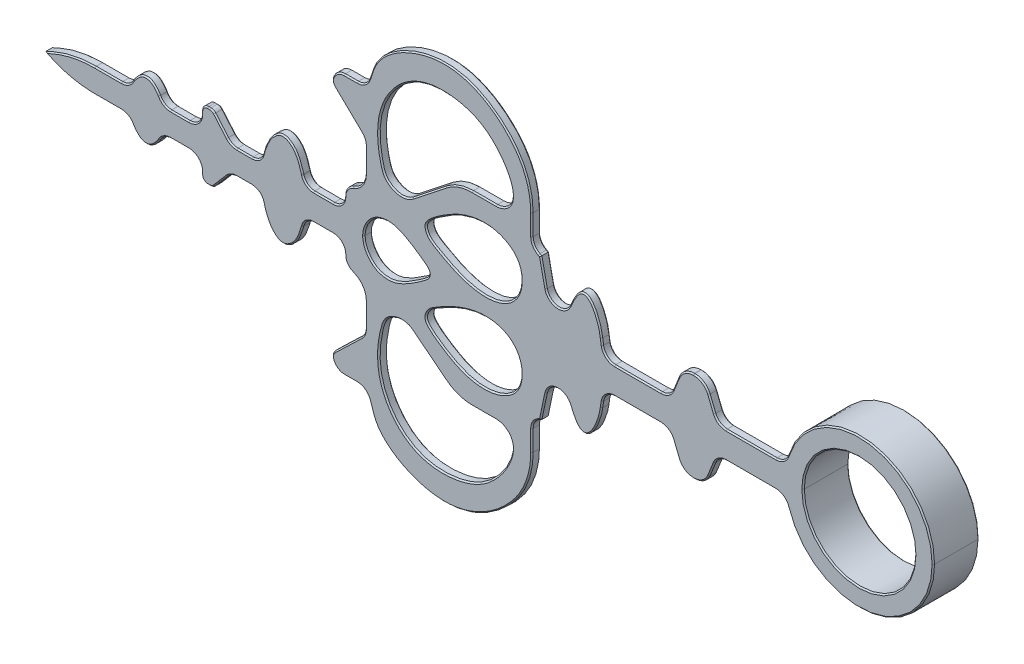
SolidWorks part; units mm, degrees
ref_plane "Спереди" through (0, 0, 0) normal (0, 0, 1) x (1, 0, 0)
ref_plane "Сверху" through (0, 0, 0) normal (0, 1, 0) x (1, 0, 0)
ref_plane "Справа" through (0, 0, 0) normal (1, 0, 0) x (0, 0, -1)
sketch "Эскиз1" plane through (0, 0, 0) normal (0, 0, 1) x (1, 0, 0)
  line L0 (-7.5141, -1.8697) -> (-7.1613, -1.7286)
  line L1 (-7.1613, -1.7286) -> (-6.8086, -1.5875)
  line L2 (-6.8086, -1.5875) -> (-6.4911, -1.4111)
  line L3 (-6.4911, -1.4111) -> (-6.1736, -1.1995)
  line L4 (-6.1736, -1.1995) -> (-5.8561, -1.0231)
  line L5 (-5.8561, -1.0231) -> (-5.5386, -0.7761)
  line L6 (-5.5386, -0.7761) -> (-5.2563, -0.5645)
  line L7 (-5.2563, -0.5645) -> (-4.9741, -0.2822)
  line L8 (-4.9741, -0.2822) -> (-4.9036, -0.2469)
  line L9 (-4.9036, -0.2469) -> (-4.8683, -0.1411)
  line L10 (-4.8683, -0.1411) -> (-4.8683, -0.0706)
  line L11 (-4.8683, -0.0706) -> (-4.833, 0)
  line L12 (-4.833, 0) -> (-4.8683, 0.0705)
  line L13 (-4.8683, 0.0705) -> (-4.8683, 0.1764)
  line L14 (-4.8683, 0.1764) -> (-4.9036, 0.2469)
  line L15 (-4.9036, 0.2469) -> (-4.9741, 0.2822)
  line L16 (-4.9741, 0.2822) -> (-5.2563, 0.5644)
  line L17 (-5.2563, 0.5644) -> (-5.5386, 0.7761)
  line L18 (-5.5386, 0.7761) -> (-5.8561, 0.9878)
  line L19 (-5.8561, 0.9878) -> (-6.1383, 1.1994)
  line L20 (-6.1383, 1.1994) -> (-6.4558, 1.3758)
  line L21 (-6.4558, 1.3758) -> (-6.8086, 1.5522)
  line L22 (-6.8086, 1.5522) -> (-7.1613, 1.7286)
  line L23 (-7.1613, 1.7286) -> (-7.4788, 1.8344)
  line L24 (-7.4788, 1.8344) -> (-7.8316, 1.9403)
  line L25 (-7.8316, 1.9403) -> (-8.1491, 1.9403)
  line L26 (-8.1491, 1.9403) -> (-8.5019, 1.9403)
  line L27 (-8.5019, 1.9403) -> (-8.8194, 1.8344)
  line L28 (-8.8194, 1.8344) -> (-9.1369, 1.6933)
  line L29 (-9.1369, 1.6933) -> (-9.4191, 1.4817)
  line L30 (-9.4191, 1.4817) -> (-9.6308, 1.27)
  line L31 (-9.6308, 1.27) -> (-9.8424, 0.9878)
  line L32 (-9.8424, 0.9878) -> (-9.9836, 0.6703)
  line L33 (-9.9836, 0.6703) -> (-10.0541, 0.3528)
  line L34 (-10.0541, 0.3528) -> (-10.0894, 0)
  line L35 (-10.0894, 0) -> (-10.0894, -0.3175)
  line L36 (-10.0894, -0.3175) -> (-9.9836, -0.6703)
  line L37 (-9.9836, -0.6703) -> (-9.8424, -0.9525)
  line L38 (-9.8424, -0.9525) -> (-9.6661, -1.2347)
  line L39 (-9.6661, -1.2347) -> (-9.4191, -1.4817)
  line L40 (-9.4191, -1.4817) -> (-9.1369, -1.6933)
  line L41 (-9.1369, -1.6933) -> (-8.8547, -1.8345)
  line L42 (-8.8547, -1.8345) -> (-8.5019, -1.905)
  line L43 (-8.5019, -1.905) -> (-8.1844, -1.9403)
  line L44 (-8.1844, -1.9403) -> (-7.8316, -1.9403)
  line L45 (-7.8316, -1.9403) -> (-7.5141, -1.8697)
  line L46 (-5.0447, -3.3161) -> (-4.9388, -3.5631)
  line L47 (-4.9388, -3.5631) -> (-4.6919, -3.81)
  line L48 (-4.6919, -3.81) -> (-4.198, -4.1981)
  line L49 (-4.198, -4.1981) -> (-3.7041, -4.5508)
  line L50 (-3.7041, -4.5508) -> (-3.1749, -4.8683)
  line L51 (-3.1749, -4.8683) -> (-2.4341, -5.2564)
  line L52 (-2.4341, -5.2564) -> (-1.7286, -5.5386)
  line L53 (-1.7286, -5.5386) -> (-0.9877, -5.715)
  line L54 (-0.9877, -5.715) -> (-0.1763, -5.715)
  line L55 (-0.1763, -5.715) -> (0.5998, -5.5739)
  line L56 (0.5998, -5.5739) -> (1.3759, -5.2917)
  line L57 (1.3759, -5.2917) -> (1.8698, -4.9742)
  line L58 (1.8698, -4.9742) -> (2.2578, -4.4803)
  line L59 (2.2578, -4.4803) -> (2.4695, -3.9158)
  line L60 (2.4695, -3.9158) -> (2.5753, -3.2456)
  line L61 (2.5753, -3.2456) -> (2.5048, -2.6106)
  line L62 (2.5048, -2.6106) -> (2.2578, -2.0108)
  line L63 (2.2578, -2.0108) -> (1.9051, -1.5169)
  line L64 (1.9051, -1.5169) -> (1.4112, -1.1642)
  line L65 (1.4112, -1.1642) -> (0.7409, -0.8819)
  line L66 (0.7409, -0.8819) -> (0.0706, -0.7761)
  line L67 (0.0706, -0.7761) -> (-0.6349, -0.8114)
  line L68 (-0.6349, -0.8114) -> (-1.3758, -0.9878)
  line L69 (-1.3758, -0.9878) -> (-2.1872, -1.2347)
  line L70 (-2.1872, -1.2347) -> (-2.928, -1.4817)
  line L71 (-2.928, -1.4817) -> (-3.6336, -1.7992)
  line L72 (-3.6336, -1.7992) -> (-4.2686, -2.1519)
  line L73 (-4.2686, -2.1519) -> (-4.6213, -2.3989)
  line L74 (-4.6213, -2.3989) -> (-4.9036, -2.6811)
  line L75 (-4.9036, -2.6811) -> (-5.0799, -2.9986)
  line L76 (-5.0799, -2.9986) -> (-5.0447, -3.3161)
  line L77 (-5.0447, 3.3161) -> (-5.0799, 2.9986)
  line L78 (-5.0799, 2.9986) -> (-4.9036, 2.6811)
  line L79 (-4.9036, 2.6811) -> (-4.6213, 2.3989)
  line L80 (-4.6213, 2.3989) -> (-4.2686, 2.1519)
  line L81 (-4.2686, 2.1519) -> (-3.6336, 1.7992)
  line L82 (-3.6336, 1.7992) -> (-2.928, 1.4817)
  line L83 (-2.928, 1.4817) -> (-2.1872, 1.2347)
  line L84 (-2.1872, 1.2347) -> (-1.3758, 0.9878)
  line L85 (-1.3758, 0.9878) -> (-0.6349, 0.8114)
  line L86 (-0.6349, 0.8114) -> (0.0706, 0.7761)
  line L87 (0.0706, 0.7761) -> (0.7409, 0.8819)
  line L88 (0.7409, 0.8819) -> (1.4112, 1.1642)
  line L89 (1.4112, 1.1642) -> (1.9051, 1.5169)
  line L90 (1.9051, 1.5169) -> (2.2578, 2.0108)
  line L91 (2.2578, 2.0108) -> (2.5048, 2.6105)
  line L92 (2.5048, 2.6105) -> (2.5753, 3.2455)
  line L93 (2.5753, 3.2455) -> (2.4695, 3.9158)
  line L94 (2.4695, 3.9158) -> (2.2578, 4.4803)
  line L95 (2.2578, 4.4803) -> (1.8698, 4.9742)
  line L96 (1.8698, 4.9742) -> (1.3759, 5.2917)
  line L97 (1.3759, 5.2917) -> (0.5998, 5.5739)
  line L98 (0.5998, 5.5739) -> (-0.1763, 5.715)
  line L99 (-0.1763, 5.715) -> (-0.9877, 5.715)
  line L100 (-0.9877, 5.715) -> (-1.7286, 5.5386)
  line L101 (-1.7286, 5.5386) -> (-2.4341, 5.2564)
  line L102 (-2.4341, 5.2564) -> (-3.1749, 4.8683)
  line L103 (-3.1749, 4.8683) -> (-3.8452, 4.445)
  line L104 (-3.8452, 4.445) -> (-4.4802, 4.0217)
  line L105 (-4.4802, 4.0217) -> (-4.7272, 3.7747)
  line L106 (-4.7272, 3.7747) -> (-4.9388, 3.5278)
  line L107 (-4.9388, 3.5278) -> (-5.0447, 3.3161)
  line L108 (-8.4666, 5.2917) -> (-8.3255, 5.0094)
  line L109 (-8.3255, 5.0094) -> (-8.1138, 4.7625)
  line L110 (-8.1138, 4.7625) -> (-7.8669, 4.5861)
  line L111 (-7.8669, 4.5861) -> (-7.6199, 4.445)
  line L112 (-7.6199, 4.445) -> (-7.3024, 4.3744)
  line L113 (-7.3024, 4.3744) -> (-7.0202, 4.3392)
  line L114 (-7.0202, 4.3392) -> (-6.7027, 4.4097)
  line L115 (-6.7027, 4.4097) -> (-6.4205, 4.5155)
  line L116 (-6.4205, 4.5155) -> (-6.1736, 4.6567)
  line L117 (-6.1736, 4.6567) -> (-3.4924, 6.7733)
  line L118 (-3.4924, 6.7733) -> (-3.2455, 6.9144)
  line L119 (-3.2455, 6.9144) -> (-2.9986, 7.0908)
  line L120 (-2.9986, 7.0908) -> (-2.7516, 7.1967)
  line L121 (-2.7516, 7.1967) -> (-2.4694, 7.3025)
  line L122 (-2.4694, 7.3025) -> (-2.1872, 7.4083)
  line L123 (-2.1872, 7.4083) -> (-1.9049, 7.4436)
  line L124 (-1.9049, 7.4436) -> (-1.6227, 7.4789)
  line L125 (-1.6227, 7.4789) -> (-1.3405, 7.5142)
  line L126 (-1.3405, 7.5142) -> (0.5998, 7.5142)
  line L127 (0.5998, 7.5142) -> (0.8467, 7.5142)
  line L128 (0.8467, 7.5142) -> (1.1289, 7.62)
  line L129 (1.1289, 7.62) -> (1.3406, 7.7611)
  line L130 (1.3406, 7.7611) -> (1.5523, 7.9375)
  line L131 (1.5523, 7.9375) -> (1.6934, 8.1492)
  line L132 (1.6934, 8.1492) -> (1.7992, 8.3961)
  line L133 (1.7992, 8.3961) -> (1.8345, 8.6431)
  line L134 (1.8345, 8.6431) -> (1.8345, 8.9253)
  line L135 (1.8345, 8.9253) -> (1.6934, 9.5955)
  line L136 (1.6934, 9.5955) -> (1.4464, 10.2305)
  line L137 (1.4464, 10.2305) -> (1.0937, 10.8303)
  line L138 (1.0937, 10.8303) -> (0.5645, 11.4653)
  line L139 (0.5645, 11.4653) -> (-0.0705, 12.0297)
  line L140 (-0.0705, 12.0297) -> (-0.7761, 12.5236)
  line L141 (-0.7761, 12.5236) -> (-1.5522, 12.8764)
  line L142 (-1.5522, 12.8764) -> (-2.3283, 13.1233)
  line L143 (-2.3283, 13.1233) -> (-3.1749, 13.2644)
  line L144 (-3.1749, 13.2644) -> (-4.0216, 13.2644)
  line L145 (-4.0216, 13.2644) -> (-4.8683, 13.1586)
  line L146 (-4.8683, 13.1586) -> (-5.6797, 12.9117)
  line L147 (-5.6797, 12.9117) -> (-6.4558, 12.5236)
  line L148 (-6.4558, 12.5236) -> (-7.1613, 11.9592)
  line L149 (-7.1613, 11.9592) -> (-7.7611, 11.2536)
  line L150 (-7.7611, 11.2536) -> (-8.1138, 10.7244)
  line L151 (-8.1138, 10.7244) -> (-8.3961, 10.16)
  line L152 (-8.3961, 10.16) -> (-8.6077, 9.5955)
  line L153 (-8.6077, 9.5955) -> (-8.7841, 8.9605)
  line L154 (-8.7841, 8.9605) -> (-8.8547, 8.3608)
  line L155 (-8.8547, 8.3608) -> (-8.9252, 7.7258)
  line L156 (-8.9252, 7.7258) -> (-8.8899, 7.0908)
  line L157 (-8.8899, 7.0908) -> (-8.8194, 6.4911)
  line L158 (-8.8194, 6.4911) -> (-8.643, 5.8561)
  line L159 (-8.643, 5.8561) -> (-8.4666, 5.2917)
  line L160 (0.5998, -7.5142) -> (-1.3405, -7.5142)
  line L161 (-1.3405, -7.5142) -> (-1.6227, -7.4789)
  line L162 (-1.6227, -7.4789) -> (-1.9049, -7.4436)
  line L163 (-1.9049, -7.4436) -> (-2.1872, -7.4083)
  line L164 (-2.1872, -7.4083) -> (-2.4694, -7.3025)
  line L165 (-2.4694, -7.3025) -> (-2.7516, -7.1967)
  line L166 (-2.7516, -7.1967) -> (-2.9986, -7.0908)
  line L167 (-2.9986, -7.0908) -> (-3.2455, -6.9145)
  line L168 (-3.2455, -6.9145) -> (-3.4924, -6.7733)
  line L169 (-3.4924, -6.7733) -> (-6.1736, -4.6567)
  line L170 (-6.1736, -4.6567) -> (-6.4205, -4.5156)
  line L171 (-6.4205, -4.5156) -> (-6.7027, -4.4097)
  line L172 (-6.7027, -4.4097) -> (-7.0202, -4.3392)
  line L173 (-7.0202, -4.3392) -> (-7.3024, -4.3745)
  line L174 (-7.3024, -4.3745) -> (-7.6199, -4.445)
  line L175 (-7.6199, -4.445) -> (-7.8669, -4.5861)
  line L176 (-7.8669, -4.5861) -> (-8.1138, -4.7625)
  line L177 (-8.1138, -4.7625) -> (-8.3255, -5.0095)
  line L178 (-8.3255, -5.0095) -> (-8.4666, -5.2917)
  line L179 (-8.4666, -5.2917) -> (-8.643, -5.8561)
  line L180 (-8.643, -5.8561) -> (-8.8194, -6.4911)
  line L181 (-8.8194, -6.4911) -> (-8.8899, -7.0908)
  line L182 (-8.8899, -7.0908) -> (-8.9252, -7.7258)
  line L183 (-8.9252, -7.7258) -> (-8.8547, -8.3608)
  line L184 (-8.8547, -8.3608) -> (-8.7841, -8.9606)
  line L185 (-8.7841, -8.9606) -> (-8.6077, -9.5956)
  line L186 (-8.6077, -9.5956) -> (-8.3961, -10.16)
  line L187 (-8.3961, -10.16) -> (-8.1138, -10.7245)
  line L188 (-8.1138, -10.7245) -> (-7.7611, -11.2536)
  line L189 (-7.7611, -11.2536) -> (-7.3024, -12.0297)
  line L190 (-7.3024, -12.0297) -> (-6.7027, -12.6647)
  line L191 (-6.7027, -12.6647) -> (-5.9972, -13.1586)
  line L192 (-5.9972, -13.1586) -> (-5.2563, -13.4761)
  line L193 (-5.2563, -13.4761) -> (-4.4802, -13.6878)
  line L194 (-4.4802, -13.6878) -> (-3.6688, -13.7231)
  line L195 (-3.6688, -13.7231) -> (-2.8574, -13.6878)
  line L196 (-2.8574, -13.6878) -> (-2.0813, -13.5114)
  line L197 (-2.0813, -13.5114) -> (-1.3405, -13.2292)
  line L198 (-1.3405, -13.2292) -> (-0.5997, -12.8411)
  line L199 (-0.5997, -12.8411) -> (0.0353, -12.3825)
  line L200 (0.0353, -12.3825) -> (0.6351, -11.8181)
  line L201 (0.6351, -11.8181) -> (1.1289, -11.1478)
  line L202 (1.1289, -11.1478) -> (1.4817, -10.4069)
  line L203 (1.4817, -10.4069) -> (1.6934, -9.6308)
  line L204 (1.6934, -9.6308) -> (1.8345, -8.89)
  line L205 (1.8345, -8.89) -> (1.8345, -8.6431)
  line L206 (1.8345, -8.6431) -> (1.7992, -8.3961)
  line L207 (1.7992, -8.3961) -> (1.6934, -8.1492)
  line L208 (1.6934, -8.1492) -> (1.5523, -7.9375)
  line L209 (1.5523, -7.9375) -> (1.3406, -7.7611)
  line L210 (1.3406, -7.7611) -> (1.1289, -7.62)
  line L211 (1.1289, -7.62) -> (0.8467, -7.5142)
  line L212 (0.8467, -7.5142) -> (0.5998, -7.5142)
  line L213 (34.2901, 0) -> (34.2548, 0.4939)
  line L214 (34.2548, 0.4939) -> (34.1842, 0.9878)
  line L215 (34.1842, 0.9878) -> (34.0431, 1.4464)
  line L216 (34.0431, 1.4464) -> (33.8667, 1.905)
  line L217 (33.8667, 1.905) -> (33.6198, 2.3636)
  line L218 (33.6198, 2.3636) -> (33.3376, 2.7517)
  line L219 (33.3376, 2.7517) -> (33.0201, 3.1397)
  line L220 (33.0201, 3.1397) -> (32.6673, 3.4572)
  line L221 (32.6673, 3.4572) -> (32.2439, 3.7747)
  line L222 (32.2439, 3.7747) -> (31.8206, 4.0217)
  line L223 (31.8206, 4.0217) -> (31.362, 4.1981)
  line L224 (31.362, 4.1981) -> (30.9034, 4.3744)
  line L225 (30.9034, 4.3744) -> (30.4095, 4.445)
  line L226 (30.4095, 4.445) -> (29.9156, 4.5155)
  line L227 (29.9156, 4.5155) -> (29.4217, 4.4803)
  line L228 (29.4217, 4.4803) -> (28.9278, 4.4097)
  line L229 (28.9278, 4.4097) -> (28.4692, 4.3039)
  line L230 (28.4692, 4.3039) -> (27.9753, 4.1275)
  line L231 (27.9753, 4.1275) -> (27.552, 3.8805)
  line L232 (27.552, 3.8805) -> (27.1287, 3.6336)
  line L233 (27.1287, 3.6336) -> (26.7406, 3.3161)
  line L234 (26.7406, 3.3161) -> (26.3878, 2.9633)
  line L235 (26.3878, 2.9633) -> (26.1056, 2.5753)
  line L236 (26.1056, 2.5753) -> (25.8234, 2.1519)
  line L237 (25.8234, 2.1519) -> (25.6117, 1.6933)
  line L238 (25.6117, 1.6933) -> (25.4706, 1.2347)
  line L239 (25.4706, 1.2347) -> (25.3648, 0.7408)
  line L240 (25.3648, 0.7408) -> (25.2942, 0.2469)
  line L241 (25.2942, 0.2469) -> (25.2942, -0.2469)
  line L242 (25.2942, -0.2469) -> (25.3648, -0.7408)
  line L243 (25.3648, -0.7408) -> (25.4706, -1.2347)
  line L244 (25.4706, -1.2347) -> (25.6117, -1.6933)
  line L245 (25.6117, -1.6933) -> (25.8234, -2.1519)
  line L246 (25.8234, -2.1519) -> (26.1056, -2.5753)
  line L247 (26.1056, -2.5753) -> (26.3878, -2.9633)
  line L248 (26.3878, -2.9633) -> (26.7406, -3.3161)
  line L249 (26.7406, -3.3161) -> (27.1287, -3.6336)
  line L250 (27.1287, -3.6336) -> (27.552, -3.8806)
  line L251 (27.552, -3.8806) -> (27.9753, -4.1275)
  line L252 (27.9753, -4.1275) -> (28.4692, -4.3039)
  line L253 (28.4692, -4.3039) -> (28.9278, -4.4097)
  line L254 (28.9278, -4.4097) -> (29.4217, -4.4803)
  line L255 (29.4217, -4.4803) -> (29.9156, -4.4803)
  line L256 (29.9156, -4.4803) -> (30.4095, -4.445)
  line L257 (30.4095, -4.445) -> (30.9034, -4.3745)
  line L258 (30.9034, -4.3745) -> (31.362, -4.1981)
  line L259 (31.362, -4.1981) -> (31.8206, -4.0217)
  line L260 (31.8206, -4.0217) -> (32.2439, -3.7747)
  line L261 (32.2439, -3.7747) -> (32.6673, -3.4572)
  line L262 (32.6673, -3.4572) -> (33.0201, -3.1397)
  line L263 (33.0201, -3.1397) -> (33.3376, -2.7517)
  line L264 (33.3376, -2.7517) -> (33.6198, -2.3636)
  line L265 (33.6198, -2.3636) -> (33.8667, -1.905)
  line L266 (33.8667, -1.905) -> (34.0431, -1.4464)
  line L267 (34.0431, -1.4464) -> (34.1842, -0.9878)
  line L268 (34.1842, -0.9878) -> (34.2548, -0.4939)
  line L269 (34.2548, -0.4939) -> (34.2901, 0)
  line L270 (24.0595, 1.7992) -> (24.2712, 2.3283)
  line L271 (24.2712, 2.3283) -> (24.5181, 2.8575)
  line L272 (24.5181, 2.8575) -> (24.8003, 3.3161)
  line L273 (24.8003, 3.3161) -> (25.1531, 3.7747)
  line L274 (25.1531, 3.7747) -> (25.5059, 4.1981)
  line L275 (25.5059, 4.1981) -> (25.9292, 4.5861)
  line L276 (25.9292, 4.5861) -> (26.3878, 4.9389)
  line L277 (26.3878, 4.9389) -> (26.8817, 5.2211)
  line L278 (26.8817, 5.2211) -> (27.3756, 5.5033)
  line L279 (27.3756, 5.5033) -> (27.9048, 5.6797)
  line L280 (27.9048, 5.6797) -> (28.4339, 5.8561)
  line L281 (28.4339, 5.8561) -> (28.9984, 5.9619)
  line L282 (28.9984, 5.9619) -> (29.5628, 5.9972)
  line L283 (29.5628, 5.9972) -> (30.1273, 5.9972)
  line L284 (30.1273, 5.9972) -> (30.6917, 5.9267)
  line L285 (30.6917, 5.9267) -> (31.2562, 5.8208)
  line L286 (31.2562, 5.8208) -> (31.8206, 5.6444)
  line L287 (31.8206, 5.6444) -> (32.3145, 5.4328)
  line L288 (32.3145, 5.4328) -> (32.8437, 5.1858)
  line L289 (32.8437, 5.1858) -> (33.3023, 4.8683)
  line L290 (33.3023, 4.8683) -> (33.7609, 4.5155)
  line L291 (33.7609, 4.5155) -> (34.1489, 4.1275)
  line L292 (34.1489, 4.1275) -> (34.537, 3.7042)
  line L293 (34.537, 3.7042) -> (34.8545, 3.2103)
  line L294 (34.8545, 3.2103) -> (35.1367, 2.7164)
  line L295 (35.1367, 2.7164) -> (35.3837, 2.2225)
  line L296 (35.3837, 2.2225) -> (35.5601, 1.6933)
  line L297 (35.5601, 1.6933) -> (35.7012, 1.1289)
  line L298 (35.7012, 1.1289) -> (35.7717, 0.5644)
  line L299 (35.7717, 0.5644) -> (35.807, 0)
  line L300 (35.807, 0) -> (35.7717, -0.5645)
  line L301 (35.7717, -0.5645) -> (35.7012, -1.1289)
  line L302 (35.7012, -1.1289) -> (35.5601, -1.6933)
  line L303 (35.5601, -1.6933) -> (35.3837, -2.2225)
  line L304 (35.3837, -2.2225) -> (35.1367, -2.7164)
  line L305 (35.1367, -2.7164) -> (34.8545, -3.2103)
  line L306 (34.8545, -3.2103) -> (34.537, -3.7042)
  line L307 (34.537, -3.7042) -> (34.1489, -4.1275)
  line L308 (34.1489, -4.1275) -> (33.7609, -4.5156)
  line L309 (33.7609, -4.5156) -> (33.3023, -4.8683)
  line L310 (33.3023, -4.8683) -> (32.8437, -5.1858)
  line L311 (32.8437, -5.1858) -> (32.3145, -5.4328)
  line L312 (32.3145, -5.4328) -> (31.8206, -5.6445)
  line L313 (31.8206, -5.6445) -> (31.2562, -5.8208)
  line L314 (31.2562, -5.8208) -> (30.6917, -5.9267)
  line L315 (30.6917, -5.9267) -> (30.1273, -5.9972)
  line L316 (30.1273, -5.9972) -> (29.5628, -5.9972)
  line L317 (29.5628, -5.9972) -> (28.9984, -5.9619)
  line L318 (28.9984, -5.9619) -> (28.4339, -5.8561)
  line L319 (28.4339, -5.8561) -> (27.9048, -5.6797)
  line L320 (27.9048, -5.6797) -> (27.3756, -5.5033)
  line L321 (27.3756, -5.5033) -> (26.8817, -5.2211)
  line L322 (26.8817, -5.2211) -> (26.3878, -4.9389)
  line L323 (26.3878, -4.9389) -> (25.9292, -4.5861)
  line L324 (25.9292, -4.5861) -> (25.5059, -4.1981)
  line L325 (25.5059, -4.1981) -> (25.1531, -3.7747)
  line L326 (25.1531, -3.7747) -> (24.8003, -3.3161)
  line L327 (24.8003, -3.3161) -> (24.5181, -2.8575)
  line L328 (24.5181, -2.8575) -> (24.2712, -2.3283)
  line L329 (24.2712, -2.3283) -> (24.0595, -1.7992)
  line L330 (19.0853, -1.0936) -> (23.107, -1.0936)
  line L331 (18.1328, -1.7992) -> (18.2034, -1.6581)
  line L332 (18.2034, -1.6581) -> (18.2739, -1.5169)
  line L333 (18.2739, -1.5169) -> (18.3798, -1.4111)
  line L334 (18.3798, -1.4111) -> (18.4856, -1.3053)
  line L335 (18.4856, -1.3053) -> (18.6267, -1.1995)
  line L336 (18.6267, -1.1995) -> (18.7678, -1.1642)
  line L337 (18.7678, -1.1642) -> (18.9442, -1.0936)
  line L338 (18.9442, -1.0936) -> (19.0853, -1.0936)
  line L339 (14.852, -1.7992) -> (14.9578, -2.1872)
  line L340 (14.9578, -2.1872) -> (15.1342, -2.54)
  line L341 (15.1342, -2.54) -> (15.2753, -2.8575)
  line L342 (15.2753, -2.8575) -> (15.487, -3.1397)
  line L343 (15.487, -3.1397) -> (15.6987, -3.3514)
  line L344 (15.6987, -3.3514) -> (15.9103, -3.5278)
  line L345 (15.9103, -3.5278) -> (16.122, -3.6336)
  line L346 (16.122, -3.6336) -> (16.3689, -3.6689)
  line L347 (16.3689, -3.6689) -> (16.6159, -3.6689)
  line L348 (16.6159, -3.6689) -> (16.8276, -3.6336)
  line L349 (16.8276, -3.6336) -> (17.0745, -3.5278)
  line L350 (17.0745, -3.5278) -> (17.2862, -3.3514)
  line L351 (17.2862, -3.3514) -> (17.4978, -3.1397)
  line L352 (17.4978, -3.1397) -> (17.6742, -2.8575)
  line L353 (17.6742, -2.8575) -> (17.8506, -2.54)
  line L354 (17.8506, -2.54) -> (18.027, -2.1872)
  line L355 (18.027, -2.1872) -> (18.1328, -1.7992)
  line L356 (13.8642, -1.0936) -> (14.0406, -1.0936)
  line L357 (14.0406, -1.0936) -> (14.1817, -1.1642)
  line L358 (14.1817, -1.1642) -> (14.3581, -1.1995)
  line L359 (14.3581, -1.1995) -> (14.4639, -1.3053)
  line L360 (14.4639, -1.3053) -> (14.6051, -1.4111)
  line L361 (14.6051, -1.4111) -> (14.7109, -1.5169)
  line L362 (14.7109, -1.5169) -> (14.7814, -1.6581)
  line L363 (14.7814, -1.6581) -> (14.852, -1.7992)
  line L364 (10.1248, -1.0936) -> (13.8642, -1.0936)
  line L365 (9.137, -1.9403) -> (9.2076, -1.7639)
  line L366 (9.2076, -1.7639) -> (9.2781, -1.6228)
  line L367 (9.2781, -1.6228) -> (9.3487, -1.4817)
  line L368 (9.3487, -1.4817) -> (9.4898, -1.3406)
  line L369 (9.4898, -1.3406) -> (9.6309, -1.2347)
  line L370 (9.6309, -1.2347) -> (9.8073, -1.1642)
  line L371 (9.8073, -1.1642) -> (9.9484, -1.0936)
  line L372 (9.9484, -1.0936) -> (10.1248, -1.0936)
  line L373 (6.5617, -3.5983) -> (6.7028, -3.9158)
  line L374 (6.7028, -3.9158) -> (6.8439, -4.1981)
  line L375 (6.8439, -4.1981) -> (6.9851, -4.445)
  line L376 (6.9851, -4.445) -> (7.1614, -4.6567)
  line L377 (7.1614, -4.6567) -> (7.3026, -4.7978)
  line L378 (7.3026, -4.7978) -> (7.4789, -4.8683)
  line L379 (7.4789, -4.8683) -> (7.6553, -4.9036)
  line L380 (7.6553, -4.9036) -> (7.8317, -4.8683)
  line L381 (7.8317, -4.8683) -> (8.0081, -4.7978)
  line L382 (8.0081, -4.7978) -> (8.1492, -4.6567)
  line L383 (8.1492, -4.6567) -> (8.3256, -4.4803)
  line L384 (8.3256, -4.4803) -> (8.4667, -4.2333)
  line L385 (8.4667, -4.2333) -> (8.6078, -3.9511)
  line L386 (8.6078, -3.9511) -> (8.7489, -3.6336)
  line L387 (8.7489, -3.6336) -> (8.8901, -3.2808)
  line L388 (8.8901, -3.2808) -> (8.9959, -2.8575)
  line L389 (8.9959, -2.8575) -> (9.0664, -2.4342)
  line L390 (9.0664, -2.4342) -> (9.137, -1.9403)
  line L391 (5.6092, -2.9281) -> (5.7856, -2.9281)
  line L392 (5.7856, -2.9281) -> (5.9267, -2.9633)
  line L393 (5.9267, -2.9633) -> (6.0678, -3.0339)
  line L394 (6.0678, -3.0339) -> (6.2089, -3.1045)
  line L395 (6.2089, -3.1045) -> (6.3148, -3.2103)
  line L396 (6.3148, -3.2103) -> (6.4206, -3.3161)
  line L397 (6.4206, -3.3161) -> (6.4912, -3.4572)
  line L398 (6.4912, -3.4572) -> (6.5617, -3.5983)
  line L399 (5.5739, -2.9281) -> (5.6092, -2.9281)
  line L400 (4.5862, -3.7042) -> (4.6214, -3.5631)
  line L401 (4.6214, -3.5631) -> (4.692, -3.3867)
  line L402 (4.692, -3.3867) -> (4.7978, -3.2456)
  line L403 (4.7978, -3.2456) -> (4.9389, -3.1397)
  line L404 (4.9389, -3.1397) -> (5.0801, -3.0339)
  line L405 (5.0801, -3.0339) -> (5.2212, -2.9633)
  line L406 (5.2212, -2.9633) -> (5.3976, -2.9281)
  line L407 (5.3976, -2.9281) -> (5.5739, -2.9281)
  line L408 (4.1628, -5.715) -> (4.5862, -3.7042)
  line L409 (3.4573, -5.715) -> (4.1628, -5.715)
  line L410 (3.4573, -8.3608) -> (3.4573, -5.715)
  line L411 (-9.6308, -11.2889) -> (-9.3838, -12.0297)
  line L412 (-9.3838, -12.0297) -> (-8.9958, -12.7353)
  line L413 (-8.9958, -12.7353) -> (-8.4666, -13.3703)
  line L414 (-8.4666, -13.3703) -> (-7.8316, -13.9347)
  line L415 (-7.8316, -13.9347) -> (-7.1613, -14.4286)
  line L416 (-7.1613, -14.4286) -> (-6.3147, -14.8519)
  line L417 (-6.3147, -14.8519) -> (-5.468, -15.1342)
  line L418 (-5.468, -15.1342) -> (-4.5861, -15.3106)
  line L419 (-4.5861, -15.3106) -> (-3.7041, -15.3458)
  line L420 (-3.7041, -15.3458) -> (-2.5399, -15.2047)
  line L421 (-2.5399, -15.2047) -> (-1.4111, -14.8872)
  line L422 (-1.4111, -14.8872) -> (-0.3174, -14.3933)
  line L423 (-0.3174, -14.3933) -> (0.4587, -13.9347)
  line L424 (0.4587, -13.9347) -> (1.1642, -13.3703)
  line L425 (1.1642, -13.3703) -> (1.7992, -12.7)
  line L426 (1.7992, -12.7) -> (2.3637, -11.9592)
  line L427 (2.3637, -11.9592) -> (2.8223, -11.1831)
  line L428 (2.8223, -11.1831) -> (3.1398, -10.3011)
  line L429 (3.1398, -10.3011) -> (3.3514, -9.3486)
  line L430 (3.3514, -9.3486) -> (3.4573, -8.3608)
  line L431 (-10.6186, -10.5128) -> (-10.4422, -10.5128)
  line L432 (-10.4422, -10.5128) -> (-10.2658, -10.5481)
  line L433 (-10.2658, -10.5481) -> (-10.1247, -10.6186)
  line L434 (-10.1247, -10.6186) -> (-9.9836, -10.7245)
  line L435 (-9.9836, -10.7245) -> (-9.8424, -10.8303)
  line L436 (-9.8424, -10.8303) -> (-9.7366, -10.9714)
  line L437 (-9.7366, -10.9714) -> (-9.6661, -11.1478)
  line L438 (-9.6661, -11.1478) -> (-9.6308, -11.2889)
  line L439 (-11.6416, -10.5128) -> (-10.6186, -10.5128)
  line L440 (-12.6294, -9.4897) -> (-12.6294, -9.7014)
  line L441 (-12.6294, -9.7014) -> (-12.5588, -9.8778)
  line L442 (-12.5588, -9.8778) -> (-12.453, -10.0542)
  line L443 (-12.453, -10.0542) -> (-12.3472, -10.1953)
  line L444 (-12.3472, -10.1953) -> (-12.2061, -10.3364)
  line L445 (-12.2061, -10.3364) -> (-12.0297, -10.4069)
  line L446 (-12.0297, -10.4069) -> (-11.818, -10.4775)
  line L447 (-11.818, -10.4775) -> (-11.6416, -10.5128)
  line L448 (-12.3824, -9.1369) -> (-12.4177, -9.1722)
  line L449 (-12.4177, -9.1722) -> (-12.453, -9.2075)
  line L450 (-12.453, -9.2075) -> (-12.4883, -9.2428)
  line L451 (-12.4883, -9.2428) -> (-12.5236, -9.3133)
  line L452 (-12.5236, -9.3133) -> (-12.5588, -9.3486)
  line L453 (-12.5588, -9.3486) -> (-12.5941, -9.3839)
  line L454 (-12.5941, -9.3839) -> (-12.6294, -9.4545)
  line L455 (-12.6294, -9.4545) -> (-12.6294, -9.4897)
  line L456 (-10.4422, -7.2672) -> (-12.3824, -9.1369)
  line L457 (-9.9836, -6.2795) -> (-10.0188, -6.4206)
  line L458 (-10.0188, -6.4206) -> (-10.0188, -6.5617)
  line L459 (-10.0188, -6.5617) -> (-10.0541, -6.6675)
  line L460 (-10.0541, -6.6675) -> (-10.1247, -6.8086)
  line L461 (-10.1247, -6.8086) -> (-10.1599, -6.9497)
  line L462 (-10.1599, -6.9497) -> (-10.2305, -7.0556)
  line L463 (-10.2305, -7.0556) -> (-10.3363, -7.1614)
  line L464 (-10.3363, -7.1614) -> (-10.4422, -7.2672)
  line L465 (-9.9836, -4.3392) -> (-9.9836, -6.2795)
  line L466 (-10.7949, -3.0692) -> (-10.6186, -3.175)
  line L467 (-10.6186, -3.175) -> (-10.4774, -3.2808)
  line L468 (-10.4774, -3.2808) -> (-10.3363, -3.4219)
  line L469 (-10.3363, -3.4219) -> (-10.2305, -3.5983)
  line L470 (-10.2305, -3.5983) -> (-10.1247, -3.7747)
  line L471 (-10.1247, -3.7747) -> (-10.0541, -3.9511)
  line L472 (-10.0541, -3.9511) -> (-10.0188, -4.1628)
  line L473 (-10.0188, -4.1628) -> (-9.9836, -4.3392)
  line L474 (-11.0772, -2.9633) -> (-10.7949, -3.0692)
  line L475 (-11.6416, -2.0814) -> (-11.6416, -2.2225)
  line L476 (-11.6416, -2.2225) -> (-11.6063, -2.3283)
  line L477 (-11.6063, -2.3283) -> (-11.5358, -2.4695)
  line L478 (-11.5358, -2.4695) -> (-11.5005, -2.5753)
  line L479 (-11.5005, -2.5753) -> (-11.3947, -2.7164)
  line L480 (-11.3947, -2.7164) -> (-11.2888, -2.7869)
  line L481 (-11.2888, -2.7869) -> (-11.183, -2.8928)
  line L482 (-11.183, -2.8928) -> (-11.0772, -2.9633)
  line L483 (-12.6647, -1.0936) -> (-12.453, -1.1289)
  line L484 (-12.453, -1.1289) -> (-12.2766, -1.1642)
  line L485 (-12.2766, -1.1642) -> (-12.1002, -1.27)
  line L486 (-12.1002, -1.27) -> (-11.9591, -1.3758)
  line L487 (-11.9591, -1.3758) -> (-11.818, -1.5169)
  line L488 (-11.818, -1.5169) -> (-11.7474, -1.6933)
  line L489 (-11.7474, -1.6933) -> (-11.6769, -1.8697)
  line L490 (-11.6769, -1.8697) -> (-11.6416, -2.0814)
  line L491 (-14.0758, -1.0936) -> (-12.6647, -1.0936)
  line L492 (-15.0283, -1.8345) -> (-14.993, -1.6933)
  line L493 (-14.993, -1.6933) -> (-14.8872, -1.5522)
  line L494 (-14.8872, -1.5522) -> (-14.7813, -1.4111)
  line L495 (-14.7813, -1.4111) -> (-14.6755, -1.3053)
  line L496 (-14.6755, -1.3053) -> (-14.5344, -1.1995)
  line L497 (-14.5344, -1.1995) -> (-14.3933, -1.1289)
  line L498 (-14.3933, -1.1289) -> (-14.2169, -1.0936)
  line L499 (-14.2169, -1.0936) -> (-14.0758, -1.0936)
  line L500 (-18.2033, -1.7639) -> (-18.0622, -2.1519)
  line L501 (-18.0622, -2.1519) -> (-17.9563, -2.5047)
  line L502 (-17.9563, -2.5047) -> (-17.7799, -2.8222)
  line L503 (-17.7799, -2.8222) -> (-17.6388, -3.1045)
  line L504 (-17.6388, -3.1045) -> (-17.4624, -3.3514)
  line L505 (-17.4624, -3.3514) -> (-17.2508, -3.5278)
  line L506 (-17.2508, -3.5278) -> (-17.0391, -3.6689)
  line L507 (-17.0391, -3.6689) -> (-16.8274, -3.7747)
  line L508 (-16.8274, -3.7747) -> (-16.6158, -3.81)
  line L509 (-16.6158, -3.81) -> (-16.4041, -3.7747)
  line L510 (-16.4041, -3.7747) -> (-16.1924, -3.7042)
  line L511 (-16.1924, -3.7042) -> (-15.9808, -3.5631)
  line L512 (-15.9808, -3.5631) -> (-15.8044, -3.3867)
  line L513 (-15.8044, -3.3867) -> (-15.5927, -3.175)
  line L514 (-15.5927, -3.175) -> (-15.4516, -2.8928)
  line L515 (-15.4516, -2.8928) -> (-15.2752, -2.5753)
  line L516 (-15.2752, -2.5753) -> (-15.1341, -2.2225)
  line L517 (-15.1341, -2.2225) -> (-15.0283, -1.8345)
  line L518 (-19.1558, -0.9878) -> (-18.9794, -0.9878)
  line L519 (-18.9794, -0.9878) -> (-18.8383, -1.0583)
  line L520 (-18.8383, -1.0583) -> (-18.6972, -1.0936)
  line L521 (-18.6972, -1.0936) -> (-18.5561, -1.1995)
  line L522 (-18.5561, -1.1995) -> (-18.4149, -1.3053)
  line L523 (-18.4149, -1.3053) -> (-18.3091, -1.4464)
  line L524 (-18.3091, -1.4464) -> (-18.2386, -1.5875)
  line L525 (-18.2386, -1.5875) -> (-18.2033, -1.7639)
  line L526 (-20.3552, -0.9878) -> (-19.1558, -0.9878)
  line L527 (-21.0961, -1.3406) -> (-21.0255, -1.27)
  line L528 (-21.0255, -1.27) -> (-20.9549, -1.1995)
  line L529 (-20.9549, -1.1995) -> (-20.8491, -1.1289)
  line L530 (-20.8491, -1.1289) -> (-20.7786, -1.0936)
  line L531 (-20.7786, -1.0936) -> (-20.6727, -1.0231)
  line L532 (-20.6727, -1.0231) -> (-20.5669, -1.0231)
  line L533 (-20.5669, -1.0231) -> (-20.4611, -0.9878)
  line L534 (-20.4611, -0.9878) -> (-20.3552, -0.9878)
  line L535 (-22.1191, -2.54) -> (-21.0961, -1.3406)
  line L536 (-22.5072, -2.7164) -> (-22.4366, -2.7164)
  line L537 (-22.4366, -2.7164) -> (-22.4013, -2.7164)
  line L538 (-22.4013, -2.7164) -> (-22.3308, -2.6811)
  line L539 (-22.3308, -2.6811) -> (-22.2955, -2.6811)
  line L540 (-22.2955, -2.6811) -> (-22.2602, -2.6458)
  line L541 (-22.2602, -2.6458) -> (-22.1897, -2.6106)
  line L542 (-22.1897, -2.6106) -> (-22.1544, -2.5753)
  line L543 (-22.1544, -2.5753) -> (-22.1191, -2.54)
  line L544 (-22.6836, -2.7164) -> (-22.5072, -2.7164)
  line L545 (-23.1774, -2.2225) -> (-23.1774, -2.3283)
  line L546 (-23.1774, -2.3283) -> (-23.1422, -2.3989)
  line L547 (-23.1422, -2.3989) -> (-23.1069, -2.5047)
  line L548 (-23.1069, -2.5047) -> (-23.0363, -2.5753)
  line L549 (-23.0363, -2.5753) -> (-22.9658, -2.6458)
  line L550 (-22.9658, -2.6458) -> (-22.8599, -2.6811)
  line L551 (-22.8599, -2.6811) -> (-22.7541, -2.7164)
  line L552 (-22.7541, -2.7164) -> (-22.6836, -2.7164)
  line L553 (-23.1774, -1.9756) -> (-23.1774, -2.2225)
  line L554 (-24.1652, -0.9878) -> (-23.9888, -1.0231)
  line L555 (-23.9888, -1.0231) -> (-23.7772, -1.0583)
  line L556 (-23.7772, -1.0583) -> (-23.6008, -1.1642)
  line L557 (-23.6008, -1.1642) -> (-23.4597, -1.27)
  line L558 (-23.4597, -1.27) -> (-23.3538, -1.4464)
  line L559 (-23.3538, -1.4464) -> (-23.248, -1.6228)
  line L560 (-23.248, -1.6228) -> (-23.1774, -1.7992)
  line L561 (-23.1774, -1.7992) -> (-23.1774, -1.9756)
  line L562 (-25.6469, -0.9878) -> (-24.1652, -0.9878)
  line L563 (-26.5641, -1.5522) -> (-26.4936, -1.4111)
  line L564 (-26.4936, -1.4111) -> (-26.3877, -1.3053)
  line L565 (-26.3877, -1.3053) -> (-26.2819, -1.2347)
  line L566 (-26.2819, -1.2347) -> (-26.1761, -1.1289)
  line L567 (-26.1761, -1.1289) -> (-26.0702, -1.0583)
  line L568 (-26.0702, -1.0583) -> (-25.9291, -1.0231)
  line L569 (-25.9291, -1.0231) -> (-25.788, -0.9878)
  line L570 (-25.788, -0.9878) -> (-25.6469, -0.9878)
  line L571 (-28.6808, -1.5522) -> (-28.5397, -1.7992)
  line L572 (-28.5397, -1.7992) -> (-28.328, -2.0108)
  line L573 (-28.328, -2.0108) -> (-28.1516, -2.1872)
  line L574 (-28.1516, -2.1872) -> (-27.9399, -2.2931)
  line L575 (-27.9399, -2.2931) -> (-27.7283, -2.3636)
  line L576 (-27.7283, -2.3636) -> (-27.5166, -2.3636)
  line L577 (-27.5166, -2.3636) -> (-27.2697, -2.2931)
  line L578 (-27.2697, -2.2931) -> (-27.0933, -2.1872)
  line L579 (-27.0933, -2.1872) -> (-26.8816, -2.0108)
  line L580 (-26.8816, -2.0108) -> (-26.7052, -1.7992)
  line L581 (-26.7052, -1.7992) -> (-26.5641, -1.5522)
  line L582 (-29.5627, -0.9878) -> (-29.4216, -0.9878)
  line L583 (-29.4216, -0.9878) -> (-29.3158, -1.0231)
  line L584 (-29.3158, -1.0231) -> (-29.1747, -1.0583)
  line L585 (-29.1747, -1.0583) -> (-29.0336, -1.1289)
  line L586 (-29.0336, -1.1289) -> (-28.9277, -1.1995)
  line L587 (-28.9277, -1.1995) -> (-28.8219, -1.3053)
  line L588 (-28.8219, -1.3053) -> (-28.7513, -1.4111)
  line L589 (-28.7513, -1.4111) -> (-28.6808, -1.5522)
  line L590 (-31.7499, -0.9878) -> (-29.5627, -0.9878)
  line L591 (-35.8069, 0) -> (-35.313, -0.2117)
  line L592 (-35.313, -0.2117) -> (-34.8191, -0.4233)
  line L593 (-34.8191, -0.4233) -> (-34.3252, -0.5997)
  line L594 (-34.3252, -0.5997) -> (-33.8313, -0.7408)
  line L595 (-33.8313, -0.7408) -> (-33.3022, -0.8467)
  line L596 (-33.3022, -0.8467) -> (-32.8083, -0.9172)
  line L597 (-32.8083, -0.9172) -> (-32.2791, -0.9878)
  line L598 (-32.2791, -0.9878) -> (-31.7499, -0.9878)
  line L599 (-31.7499, 0.9878) -> (-32.2791, 0.9878)
  line L600 (-32.2791, 0.9878) -> (-32.8083, 0.9172)
  line L601 (-32.8083, 0.9172) -> (-33.3022, 0.8467)
  line L602 (-33.3022, 0.8467) -> (-33.8313, 0.7408)
  line L603 (-33.8313, 0.7408) -> (-34.3252, 0.5997)
  line L604 (-34.3252, 0.5997) -> (-34.8191, 0.4233)
  line L605 (-34.8191, 0.4233) -> (-35.313, 0.2117)
  line L606 (-35.313, 0.2117) -> (-35.8069, 0)
  line L607 (-29.598, 0.9878) -> (-31.7499, 0.9878)
  line L608 (-28.7161, 1.5522) -> (-28.7866, 1.4111)
  line L609 (-28.7866, 1.4111) -> (-28.8572, 1.3053)
  line L610 (-28.8572, 1.3053) -> (-28.963, 1.2347)
  line L611 (-28.963, 1.2347) -> (-29.0688, 1.1289)
  line L612 (-29.0688, 1.1289) -> (-29.2099, 1.0583)
  line L613 (-29.2099, 1.0583) -> (-29.3158, 1.0231)
  line L614 (-29.3158, 1.0231) -> (-29.4569, 0.9878)
  line L615 (-29.4569, 0.9878) -> (-29.598, 0.9878)
  line L616 (-26.5641, 1.5522) -> (-26.7405, 1.7992)
  line L617 (-26.7405, 1.7992) -> (-26.9169, 2.0108)
  line L618 (-26.9169, 2.0108) -> (-27.0933, 2.1872)
  line L619 (-27.0933, 2.1872) -> (-27.3049, 2.2931)
  line L620 (-27.3049, 2.2931) -> (-27.5519, 2.3636)
  line L621 (-27.5519, 2.3636) -> (-27.7636, 2.3636)
  line L622 (-27.7636, 2.3636) -> (-27.9752, 2.2931)
  line L623 (-27.9752, 2.2931) -> (-28.1869, 2.1872)
  line L624 (-28.1869, 2.1872) -> (-28.3633, 2.0108)
  line L625 (-28.3633, 2.0108) -> (-28.5397, 1.7992)
  line L626 (-28.5397, 1.7992) -> (-28.7161, 1.5522)
  line L627 (-25.6822, 0.9878) -> (-25.8233, 0.9878)
  line L628 (-25.8233, 0.9878) -> (-25.9644, 1.0231)
  line L629 (-25.9644, 1.0231) -> (-26.0702, 1.0583)
  line L630 (-26.0702, 1.0583) -> (-26.2113, 1.1289)
  line L631 (-26.2113, 1.1289) -> (-26.3172, 1.1994)
  line L632 (-26.3172, 1.1994) -> (-26.423, 1.3053)
  line L633 (-26.423, 1.3053) -> (-26.4936, 1.4111)
  line L634 (-26.4936, 1.4111) -> (-26.5641, 1.5522)
  line L635 (-24.1652, 0.9878) -> (-25.6822, 0.9878)
  line L636 (-23.1774, 1.9755) -> (-23.1774, 1.7992)
  line L637 (-23.1774, 1.7992) -> (-23.248, 1.6228)
  line L638 (-23.248, 1.6228) -> (-23.3538, 1.4464)
  line L639 (-23.3538, 1.4464) -> (-23.4597, 1.27)
  line L640 (-23.4597, 1.27) -> (-23.6008, 1.1642)
  line L641 (-23.6008, 1.1642) -> (-23.7772, 1.0583)
  line L642 (-23.7772, 1.0583) -> (-23.9888, 1.0231)
  line L643 (-23.9888, 1.0231) -> (-24.1652, 0.9878)
  line L644 (-23.1774, 2.2225) -> (-23.1774, 1.9755)
  line L645 (-22.6836, 2.7164) -> (-22.7541, 2.7164)
  line L646 (-22.7541, 2.7164) -> (-22.8599, 2.6811)
  line L647 (-22.8599, 2.6811) -> (-22.9658, 2.6458)
  line L648 (-22.9658, 2.6458) -> (-23.0363, 2.5753)
  line L649 (-23.0363, 2.5753) -> (-23.1069, 2.5047)
  line L650 (-23.1069, 2.5047) -> (-23.1422, 2.3989)
  line L651 (-23.1422, 2.3989) -> (-23.1774, 2.3283)
  line L652 (-23.1774, 2.3283) -> (-23.1774, 2.2225)
  line L653 (-22.5072, 2.7164) -> (-22.6836, 2.7164)
  line L654 (-22.1191, 2.54) -> (-22.1544, 2.5753)
  line L655 (-22.1544, 2.5753) -> (-22.1897, 2.6105)
  line L656 (-22.1897, 2.6105) -> (-22.2602, 2.6458)
  line L657 (-22.2602, 2.6458) -> (-22.2955, 2.6811)
  line L658 (-22.2955, 2.6811) -> (-22.3308, 2.6811)
  line L659 (-22.3308, 2.6811) -> (-22.4013, 2.7164)
  line L660 (-22.4013, 2.7164) -> (-22.4366, 2.7164)
  line L661 (-22.4366, 2.7164) -> (-22.5072, 2.7164)
  line L662 (-21.0961, 1.3405) -> (-22.1191, 2.54)
  line L663 (-20.3552, 0.9878) -> (-20.4611, 0.9878)
  line L664 (-20.4611, 0.9878) -> (-20.5669, 1.0231)
  line L665 (-20.5669, 1.0231) -> (-20.6727, 1.0583)
  line L666 (-20.6727, 1.0583) -> (-20.7786, 1.0936)
  line L667 (-20.7786, 1.0936) -> (-20.8491, 1.1289)
  line L668 (-20.8491, 1.1289) -> (-20.9549, 1.1994)
  line L669 (-20.9549, 1.1994) -> (-21.0255, 1.27)
  line L670 (-21.0255, 1.27) -> (-21.0961, 1.3405)
  line L671 (-19.1558, 0.9878) -> (-20.3552, 0.9878)
  line L672 (-18.2033, 1.7639) -> (-18.2386, 1.5875)
  line L673 (-18.2386, 1.5875) -> (-18.3091, 1.4464)
  line L674 (-18.3091, 1.4464) -> (-18.4149, 1.3053)
  line L675 (-18.4149, 1.3053) -> (-18.5561, 1.1994)
  line L676 (-18.5561, 1.1994) -> (-18.6972, 1.0936)
  line L677 (-18.6972, 1.0936) -> (-18.8383, 1.0583)
  line L678 (-18.8383, 1.0583) -> (-18.9794, 0.9878)
  line L679 (-18.9794, 0.9878) -> (-19.1558, 0.9878)
  line L680 (-15.0283, 1.8344) -> (-15.1341, 2.2225)
  line L681 (-15.1341, 2.2225) -> (-15.2752, 2.5753)
  line L682 (-15.2752, 2.5753) -> (-15.4516, 2.8928)
  line L683 (-15.4516, 2.8928) -> (-15.5927, 3.175)
  line L684 (-15.5927, 3.175) -> (-15.8044, 3.3867)
  line L685 (-15.8044, 3.3867) -> (-15.9808, 3.5631)
  line L686 (-15.9808, 3.5631) -> (-16.1924, 3.7042)
  line L687 (-16.1924, 3.7042) -> (-16.4041, 3.7747)
  line L688 (-16.4041, 3.7747) -> (-16.6158, 3.81)
  line L689 (-16.6158, 3.81) -> (-16.8274, 3.7747)
  line L690 (-16.8274, 3.7747) -> (-17.0391, 3.6689)
  line L691 (-17.0391, 3.6689) -> (-17.2508, 3.5278)
  line L692 (-17.2508, 3.5278) -> (-17.4624, 3.3514)
  line L693 (-17.4624, 3.3514) -> (-17.6388, 3.1044)
  line L694 (-17.6388, 3.1044) -> (-17.7799, 2.8222)
  line L695 (-17.7799, 2.8222) -> (-17.9563, 2.5047)
  line L696 (-17.9563, 2.5047) -> (-18.0622, 2.1519)
  line L697 (-18.0622, 2.1519) -> (-18.2033, 1.7639)
  line L698 (-14.0758, 1.0936) -> (-14.2169, 1.0936)
  line L699 (-14.2169, 1.0936) -> (-14.3933, 1.1642)
  line L700 (-14.3933, 1.1642) -> (-14.5344, 1.1994)
  line L701 (-14.5344, 1.1994) -> (-14.6755, 1.3053)
  line L702 (-14.6755, 1.3053) -> (-14.7813, 1.4111)
  line L703 (-14.7813, 1.4111) -> (-14.8872, 1.5522)
  line L704 (-14.8872, 1.5522) -> (-14.993, 1.6933)
  line L705 (-14.993, 1.6933) -> (-15.0283, 1.8344)
  line L706 (-12.6294, 1.0936) -> (-14.0758, 1.0936)
  line L707 (-11.6416, 2.0814) -> (-11.6769, 1.8697)
  line L708 (-11.6769, 1.8697) -> (-11.7474, 1.6933)
  line L709 (-11.7474, 1.6933) -> (-11.818, 1.5169)
  line L710 (-11.818, 1.5169) -> (-11.9591, 1.3758)
  line L711 (-11.9591, 1.3758) -> (-12.1002, 1.27)
  line L712 (-12.1002, 1.27) -> (-12.2766, 1.1642)
  line L713 (-12.2766, 1.1642) -> (-12.453, 1.1289)
  line L714 (-12.453, 1.1289) -> (-12.6294, 1.0936)
  line L715 (-11.0772, 2.9633) -> (-11.183, 2.8928)
  line L716 (-11.183, 2.8928) -> (-11.2888, 2.7869)
  line L717 (-11.2888, 2.7869) -> (-11.3947, 2.7164)
  line L718 (-11.3947, 2.7164) -> (-11.5005, 2.6105)
  line L719 (-11.5005, 2.6105) -> (-11.5358, 2.4694)
  line L720 (-11.5358, 2.4694) -> (-11.6063, 2.3283)
  line L721 (-11.6063, 2.3283) -> (-11.6416, 2.2225)
  line L722 (-11.6416, 2.2225) -> (-11.6416, 2.0814)
  line L723 (-10.7949, 3.0692) -> (-11.0772, 2.9633)
  line L724 (-9.9836, 4.3392) -> (-10.0188, 4.1628)
  line L725 (-10.0188, 4.1628) -> (-10.0541, 3.9511)
  line L726 (-10.0541, 3.9511) -> (-10.1247, 3.7747)
  line L727 (-10.1247, 3.7747) -> (-10.2305, 3.5983)
  line L728 (-10.2305, 3.5983) -> (-10.3363, 3.4219)
  line L729 (-10.3363, 3.4219) -> (-10.4774, 3.2808)
  line L730 (-10.4774, 3.2808) -> (-10.6186, 3.175)
  line L731 (-10.6186, 3.175) -> (-10.7949, 3.0692)
  line L732 (-9.9836, 6.2794) -> (-9.9836, 4.3392)
  line L733 (-10.4422, 7.2672) -> (-10.3363, 7.1614)
  line L734 (-10.3363, 7.1614) -> (-10.2305, 7.0555)
  line L735 (-10.2305, 7.0555) -> (-10.1599, 6.9497)
  line L736 (-10.1599, 6.9497) -> (-10.1247, 6.8086)
  line L737 (-10.1247, 6.8086) -> (-10.0541, 6.6675)
  line L738 (-10.0541, 6.6675) -> (-10.0188, 6.5617)
  line L739 (-10.0188, 6.5617) -> (-10.0188, 6.4205)
  line L740 (-10.0188, 6.4205) -> (-9.9836, 6.2794)
  line L741 (-12.3119, 9.0664) -> (-10.4422, 7.2672)
  line L742 (-12.6294, 9.8072) -> (-12.6294, 9.7014)
  line L743 (-12.6294, 9.7014) -> (-12.6294, 9.5955)
  line L744 (-12.6294, 9.5955) -> (-12.5941, 9.4897)
  line L745 (-12.5941, 9.4897) -> (-12.5588, 9.4192)
  line L746 (-12.5588, 9.4192) -> (-12.5236, 9.3133)
  line L747 (-12.5236, 9.3133) -> (-12.453, 9.2428)
  line L748 (-12.453, 9.2428) -> (-12.3824, 9.1369)
  line L749 (-12.3824, 9.1369) -> (-12.3119, 9.0664)
  line L750 (-11.6769, 10.5128) -> (-11.8533, 10.4775)
  line L751 (-11.8533, 10.4775) -> (-11.9944, 10.4422)
  line L752 (-11.9944, 10.4422) -> (-12.1355, 10.4069)
  line L753 (-12.1355, 10.4069) -> (-12.2766, 10.3011)
  line L754 (-12.2766, 10.3011) -> (-12.3824, 10.1953)
  line L755 (-12.3824, 10.1953) -> (-12.4883, 10.0894)
  line L756 (-12.4883, 10.0894) -> (-12.5588, 9.9483)
  line L757 (-12.5588, 9.9483) -> (-12.6294, 9.8072)
  line L758 (-10.6186, 10.5128) -> (-11.6769, 10.5128)
  line L759 (-9.6308, 11.2889) -> (-9.6661, 11.1478)
  line L760 (-9.6661, 11.1478) -> (-9.7366, 10.9714)
  line L761 (-9.7366, 10.9714) -> (-9.8424, 10.8303)
  line L762 (-9.8424, 10.8303) -> (-9.9836, 10.7244)
  line L763 (-9.9836, 10.7244) -> (-10.1247, 10.6186)
  line L764 (-10.1247, 10.6186) -> (-10.2658, 10.5481)
  line L765 (-10.2658, 10.5481) -> (-10.4422, 10.5128)
  line L766 (-10.4422, 10.5128) -> (-10.6186, 10.5128)
  line L767 (3.4573, 8.3608) -> (3.3514, 9.3486)
  line L768 (3.3514, 9.3486) -> (3.1398, 10.3011)
  line L769 (3.1398, 10.3011) -> (2.8223, 11.1831)
  line L770 (2.8223, 11.1831) -> (2.3637, 11.9592)
  line L771 (2.3637, 11.9592) -> (1.7992, 12.7)
  line L772 (1.7992, 12.7) -> (1.1642, 13.3703)
  line L773 (1.1642, 13.3703) -> (0.4587, 13.9347)
  line L774 (0.4587, 13.9347) -> (-0.3174, 14.3933)
  line L775 (-0.3174, 14.3933) -> (-1.4111, 14.9225)
  line L776 (-1.4111, 14.9225) -> (-2.5399, 15.24)
  line L777 (-2.5399, 15.24) -> (-3.7041, 15.3458)
  line L778 (-3.7041, 15.3458) -> (-4.5861, 15.3105)
  line L779 (-4.5861, 15.3105) -> (-5.468, 15.1342)
  line L780 (-5.468, 15.1342) -> (-6.3147, 14.8519)
  line L781 (-6.3147, 14.8519) -> (-7.1613, 14.4286)
  line L782 (-7.1613, 14.4286) -> (-7.8316, 13.9347)
  line L783 (-7.8316, 13.9347) -> (-8.4666, 13.3703)
  line L784 (-8.4666, 13.3703) -> (-8.9958, 12.7353)
  line L785 (-8.9958, 12.7353) -> (-9.3838, 12.0297)
  line L786 (-9.3838, 12.0297) -> (-9.6308, 11.2889)
  line L787 (3.4573, 6.6675) -> (3.4573, 8.3608)
  line L788 (4.1628, 5.715) -> (4.0217, 5.7855)
  line L789 (4.0217, 5.7855) -> (3.8806, 5.8561)
  line L790 (3.8806, 5.8561) -> (3.7395, 5.9619)
  line L791 (3.7395, 5.9619) -> (3.6337, 6.0678)
  line L792 (3.6337, 6.0678) -> (3.5631, 6.2089)
  line L793 (3.5631, 6.2089) -> (3.4926, 6.35)
  line L794 (3.4926, 6.35) -> (3.4573, 6.5264)
  line L795 (3.4573, 6.5264) -> (3.4573, 6.6675)
  line L796 (4.5862, 3.7042) -> (4.1628, 5.715)
  line L797 (5.5739, 2.9281) -> (5.3976, 2.9281)
  line L798 (5.3976, 2.9281) -> (5.2212, 2.9633)
  line L799 (5.2212, 2.9633) -> (5.0801, 3.0339)
  line L800 (5.0801, 3.0339) -> (4.9389, 3.1397)
  line L801 (4.9389, 3.1397) -> (4.7978, 3.2808)
  line L802 (4.7978, 3.2808) -> (4.692, 3.3867)
  line L803 (4.692, 3.3867) -> (4.6214, 3.5631)
  line L804 (4.6214, 3.5631) -> (4.5862, 3.7042)
  line L805 (5.6092, 2.9281) -> (5.5739, 2.9281)
  line L806 (6.5617, 3.5983) -> (6.4912, 3.4572)
  line L807 (6.4912, 3.4572) -> (6.4206, 3.3161)
  line L808 (6.4206, 3.3161) -> (6.3148, 3.2103)
  line L809 (6.3148, 3.2103) -> (6.2089, 3.1044)
  line L810 (6.2089, 3.1044) -> (6.0678, 3.0339)
  line L811 (6.0678, 3.0339) -> (5.9267, 2.9633)
  line L812 (5.9267, 2.9633) -> (5.7856, 2.9281)
  line L813 (5.7856, 2.9281) -> (5.6092, 2.9281)
  line L814 (9.137, 1.9403) -> (9.0664, 2.4342)
  line L815 (9.0664, 2.4342) -> (8.9959, 2.8575)
  line L816 (8.9959, 2.8575) -> (8.8901, 3.2808)
  line L817 (8.8901, 3.2808) -> (8.7489, 3.6336)
  line L818 (8.7489, 3.6336) -> (8.6078, 3.9511)
  line L819 (8.6078, 3.9511) -> (8.4667, 4.2333)
  line L820 (8.4667, 4.2333) -> (8.3256, 4.4803)
  line L821 (8.3256, 4.4803) -> (8.1492, 4.6567)
  line L822 (8.1492, 4.6567) -> (8.0081, 4.7978)
  line L823 (8.0081, 4.7978) -> (7.8317, 4.8683)
  line L824 (7.8317, 4.8683) -> (7.6553, 4.9036)
  line L825 (7.6553, 4.9036) -> (7.4789, 4.8683)
  line L826 (7.4789, 4.8683) -> (7.3026, 4.7978)
  line L827 (7.3026, 4.7978) -> (7.1614, 4.6567)
  line L828 (7.1614, 4.6567) -> (6.9851, 4.445)
  line L829 (6.9851, 4.445) -> (6.8439, 4.1981)
  line L830 (6.8439, 4.1981) -> (6.7028, 3.9158)
  line L831 (6.7028, 3.9158) -> (6.5617, 3.5983)
  line L832 (10.1248, 1.0936) -> (9.9484, 1.1289)
  line L833 (9.9484, 1.1289) -> (9.8073, 1.1642)
  line L834 (9.8073, 1.1642) -> (9.6309, 1.2347)
  line L835 (9.6309, 1.2347) -> (9.4898, 1.3405)
  line L836 (9.4898, 1.3405) -> (9.3487, 1.4817)
  line L837 (9.3487, 1.4817) -> (9.2781, 1.6228)
  line L838 (9.2781, 1.6228) -> (9.2076, 1.7639)
  line L839 (9.2076, 1.7639) -> (9.137, 1.9403)
  line L840 (13.8642, 1.0936) -> (10.1248, 1.0936)
  line L841 (14.852, 1.8344) -> (14.7814, 1.6581)
  line L842 (14.7814, 1.6581) -> (14.7109, 1.5169)
  line L843 (14.7109, 1.5169) -> (14.6051, 1.4111)
  line L844 (14.6051, 1.4111) -> (14.4639, 1.3053)
  line L845 (14.4639, 1.3053) -> (14.3581, 1.1994)
  line L846 (14.3581, 1.1994) -> (14.1817, 1.1642)
  line L847 (14.1817, 1.1642) -> (14.0406, 1.0936)
  line L848 (14.0406, 1.0936) -> (13.8642, 1.0936)
  line L849 (18.1328, 1.8344) -> (18.027, 2.1872)
  line L850 (18.027, 2.1872) -> (17.8506, 2.54)
  line L851 (17.8506, 2.54) -> (17.6742, 2.8575)
  line L852 (17.6742, 2.8575) -> (17.4978, 3.1397)
  line L853 (17.4978, 3.1397) -> (17.2862, 3.3514)
  line L854 (17.2862, 3.3514) -> (17.0745, 3.5278)
  line L855 (17.0745, 3.5278) -> (16.8276, 3.6336)
  line L856 (16.8276, 3.6336) -> (16.6159, 3.6689)
  line L857 (16.6159, 3.6689) -> (16.3689, 3.6689)
  line L858 (16.3689, 3.6689) -> (16.122, 3.6336)
  line L859 (16.122, 3.6336) -> (15.9103, 3.5278)
  line L860 (15.9103, 3.5278) -> (15.6987, 3.3514)
  line L861 (15.6987, 3.3514) -> (15.487, 3.1397)
  line L862 (15.487, 3.1397) -> (15.2753, 2.8575)
  line L863 (15.2753, 2.8575) -> (15.1342, 2.54)
  line L864 (15.1342, 2.54) -> (14.9578, 2.1872)
  line L865 (14.9578, 2.1872) -> (14.852, 1.8344)
  line L866 (19.0853, 1.0936) -> (18.9442, 1.0936)
  line L867 (18.9442, 1.0936) -> (18.7678, 1.1642)
  line L868 (18.7678, 1.1642) -> (18.6267, 1.1994)
  line L869 (18.6267, 1.1994) -> (18.4856, 1.3053)
  line L870 (18.4856, 1.3053) -> (18.3798, 1.4111)
  line L871 (18.3798, 1.4111) -> (18.2739, 1.5169)
  line L872 (18.2739, 1.5169) -> (18.2034, 1.6581)
  line L873 (18.2034, 1.6581) -> (18.1328, 1.8344)
  line L874 (23.107, 1.0936) -> (19.0853, 1.0936)
  line L875 (23.107, 1.0936) -> (23.2834, 1.0936)
  line L876 (23.2834, 1.0936) -> (23.4245, 1.1289)
  line L877 (23.4245, 1.1289) -> (23.5656, 1.1994)
  line L878 (23.5656, 1.1994) -> (23.7067, 1.3053)
  line L879 (23.7067, 1.3053) -> (23.8126, 1.4111)
  line L880 (23.8126, 1.4111) -> (23.9184, 1.5169)
  line L881 (23.9184, 1.5169) -> (24.0242, 1.6581)
  line L882 (24.0242, 1.6581) -> (24.0595, 1.7992)
  line L883 (24.0595, -1.7992) -> (24.0242, -1.6581)
  line L884 (24.0242, -1.6581) -> (23.9184, -1.5169)
  line L885 (23.9184, -1.5169) -> (23.8126, -1.3758)
  line L886 (23.8126, -1.3758) -> (23.7067, -1.3053)
  line L887 (23.7067, -1.3053) -> (23.5656, -1.1995)
  line L888 (23.5656, -1.1995) -> (23.4245, -1.1289)
  line L889 (23.4245, -1.1289) -> (23.2834, -1.0936)
  line L890 (23.2834, -1.0936) -> (23.107, -1.0936)
  line L891 (29.8098, 4.508) -> (29.8098, -4.4803)
  line L892 (25.2941, 0.0182) -> (34.2901, 0)
sketch "Эскиз2" plane through (0, 0, 0) normal (0, 0, 1) x (1, 0, 0)
  line L0 (29.8098, 4.508) -> (29.8098, -4.4803) construction
  line L1 (-35.8069, 0) -> (35.8098, 0) construction
  line L2 (-29.598, 0.9878) -> (-31.7499, 0.9878) construction
  line L3 (-29.6163, 0.9878) -> (-31.7499, 0.9878)
  line L4 (-24.1652, 0.9878) -> (-25.6822, 0.9878) construction
  line L5 (-26.4936, 1.4111) -> (-26.5641, 1.5522) construction
  line L6 (-28.7161, 1.5522) -> (-28.7866, 1.4111) construction
  line L7 (-23.1774, 2.2225) -> (-23.1774, 1.9755) construction
  line L8 (-21.0961, 1.3405) -> (-22.1191, 2.54) construction
  line L9 (-22.5072, 2.7164) -> (-22.6836, 2.7164) construction
  line L10 (-19.1558, 0.9878) -> (-20.3552, 0.9878) construction
  line L11 (-14.993, 1.6933) -> (-15.0283, 1.8344) construction
  line L12 (-18.2033, 1.7639) -> (-18.2386, 1.5875) construction
  line L13 (-12.6294, 1.0936) -> (-14.0758, 1.0936) construction
  line L14 (-11.6416, 2.2225) -> (-11.6416, 2.0814) construction
  line L15 (-10.7949, 3.0692) -> (-11.0772, 2.9633) construction
  line L16 (-9.9836, 6.2794) -> (-9.9836, 4.3392) construction
  line L17 (-12.3119, 9.0664) -> (-10.4422, 7.2672) construction
  line L18 (-10.6186, 10.5128) -> (-11.6769, 10.5128) construction
  line L19 (-12.4883, 10.0894) -> (-12.5588, 9.9483) construction
  line L20 (-9.3838, 12.0297) -> (-9.6308, 11.2889) construction
  line L21 (3.4573, 6.6675) -> (3.4573, 8.3608) construction
  line L22 (4.5862, 3.7042) -> (4.1628, 5.715) construction
  line L23 (6.7028, 3.9158) -> (6.5617, 3.5983) construction
  line L24 (9.137, 1.9403) -> (9.0664, 2.4342) construction
  line L25 (13.8642, 1.0936) -> (10.1248, 1.0936) construction
  line L26 (14.852, 1.8344) -> (14.7814, 1.6581) construction
  line L27 (18.2034, 1.6581) -> (18.1328, 1.8344) construction
  line L28 (23.107, 1.0936) -> (19.0853, 1.0936) construction
  line L29 (-24.1774, 0.9878) -> (-25.6639, 0.9878)
  line L30 (-26.5584, 1.5408) -> (-26.5641, 1.5522)
  line L31 (-28.7161, 1.5522) -> (-28.7218, 1.5408)
  line L32 (-23.1774, 2.2164) -> (-23.1774, 1.9878)
  line L33 (-21.0947, 1.3389) -> (-22.1198, 2.5409)
  line L34 (-22.5003, 2.7164) -> (-22.6774, 2.7164)
  line L35 (-19.0963, 0.9878) -> (-20.3339, 0.9878)
  line L36 (-15.0135, 1.7752) -> (-15.0283, 1.8344)
  line L37 (-18.2033, 1.7639) -> (-18.2138, 1.7112)
  line L38 (-12.5416, 1.0936) -> (-14.1404, 1.0936)
  line L39 (-11.6416, 2.0587) -> (-11.6416, 1.9936)
  line L40 (-10.9568, 3.0085) -> (-10.9928, 2.9949)
  line L41 (-9.9836, 6.4004) -> (-9.9836, 4.4129)
  line L42 (-12.4583, 9.2073) -> (-10.2902, 7.1209)
  line L43 (-10.6103, 10.5128) -> (-11.6585, 10.5128)
  line L44 (-12.5531, 9.9598) -> (-12.579, 9.9078)
  line L45 (-9.3838, 12.0297) -> (-9.6616, 11.1965)
  line L46 (3.4573, 6.6857) -> (3.4573, 8.3608)
  line L47 (4.5995, 3.6412) -> (4.1628, 5.715)
  line L48 (6.7028, 3.9158) -> (6.4918, 3.4411)
  line L49 (9.1353, 1.9521) -> (9.0664, 2.4342)
  line L50 (13.8786, 1.0936) -> (10.1253, 1.0936)
  line L51 (15.2596, 2.8522) -> (14.8069, 1.7218)
  line L52 (18.1779, 1.7218) -> (17.7252, 2.8522)
  line L53 (23.1259, 1.0936) -> (19.1062, 1.0936)
  line L54 (4.1628, 5.715) -> (4.0217, 5.7855) construction
  line L55 (16.6159, 3.6689) -> (16.3689, 3.6689) construction
  line L56 (16.5184, 3.6689) -> (16.4664, 3.6689)
  line L57 (4.1628, 5.715) -> (4.0103, 5.7912)
  line L58 (23.1259, -1.0936) -> (19.1062, -1.0936)
  line L59 (18.1779, -1.7218) -> (17.7252, -2.8522)
  line L60 (16.5184, -3.6689) -> (16.4664, -3.6689)
  line L61 (15.2596, -2.8522) -> (14.8069, -1.7218)
  line L62 (13.8786, -1.0936) -> (10.1253, -1.0936)
  line L63 (9.1353, -1.9521) -> (9.0664, -2.4342)
  line L64 (6.7028, -3.9158) -> (6.4918, -3.4411)
  line L65 (4.5995, -3.6412) -> (4.1628, -5.715)
  line L66 (4.1628, -5.715) -> (4.0103, -5.7912)
  line L67 (3.4573, -6.6857) -> (3.4573, -8.3608)
  line L68 (-9.3838, -12.0297) -> (-9.6616, -11.1965)
  line L69 (-10.6103, -10.5128) -> (-11.6585, -10.5128)
  line L70 (-12.5531, -9.9598) -> (-12.579, -9.9078)
  line L71 (-12.4583, -9.2073) -> (-10.2902, -7.1209)
  line L72 (-9.9836, -6.4004) -> (-9.9836, -4.4129)
  line L73 (-10.9568, -3.0085) -> (-10.9928, -2.9949)
  line L74 (-11.6416, -2.0587) -> (-11.6416, -1.9936)
  line L75 (-12.5416, -1.0936) -> (-14.1404, -1.0936)
  line L76 (-15.0135, -1.7752) -> (-15.0283, -1.8344)
  line L77 (-18.2033, -1.7639) -> (-18.2138, -1.7112)
  line L78 (-19.0963, -0.9878) -> (-20.3339, -0.9878)
  line L79 (-21.0947, -1.3389) -> (-22.1198, -2.5409)
  line L80 (-22.5003, -2.7164) -> (-22.6774, -2.7164)
  line L81 (-23.1774, -2.2164) -> (-23.1774, -1.9878)
  line L82 (-24.1774, -0.9878) -> (-25.6639, -0.9878)
  line L83 (-28.7161, -1.5522) -> (-28.7218, -1.5408)
  line L84 (-26.5584, -1.5408) -> (-26.5641, -1.5522)
  line L85 (-29.6163, -0.9878) -> (-31.7499, -0.9878)
  line L86 (-4.833, -0.5316) -> (-4.833, 0.5316) construction
  line L87 (-10.0894, 0.094) -> (-10.0894, -0.094) construction
  line L88 (-6.1736, 4.6567) -> (-3.4924, 6.7733) construction
  line L89 (-6.1736, 4.6567) -> (-3.4924, 6.7733)
  line L90 (-1.3405, 7.5142) -> (0.5998, 7.5142) construction
  line L91 (-1.3405, 7.5142) -> (0.5998, 7.5142)
  line L92 (-1.3405, -7.5142) -> (0.5998, -7.5142)
  line L93 (-6.1736, -4.6567) -> (-3.4924, -6.7733)
  arc A0 (34.3098, 0) -> (25.3098, 0) centre (29.8098, 0.0139) ccw
  arc A1 (35.8098, 0) -> (24.0807, 1.7965) centre (29.8098, 0.0139) ccw
  arc A2 (23.1259, 1.0936) -> (24.0807, 1.7965) centre (23.1259, 2.0936) ccw
  arc A3 (19.1062, 1.0936) -> (18.1779, 1.7218) centre (19.1062, 2.0936) cw
  arc A4 (13.8786, 1.0936) -> (14.8069, 1.7218) centre (13.8786, 2.0936) ccw
  arc A5 (9.1353, 1.9521) -> (10.1253, 1.0936) centre (10.1253, 2.0936) ccw
  arc A6 (16.5184, 3.6689) -> (17.7252, 2.8522) centre (16.5184, 2.3689) cw
  arc A7 (16.4664, 3.6689) -> (15.2596, 2.8522) centre (16.4664, 2.3689) ccw
  arc A8 (6.4918, 3.4411) -> (4.5995, 3.6412) centre (5.578, 3.8472) cw
  arc A9 (4.0103, 5.7912) -> (3.4573, 6.6857) centre (4.4573, 6.6857) cw
  arc A10 (-11.6416, 2.0587) -> (-10.9928, 2.9949) centre (-10.6416, 2.0587) cw
  arc A11 (-9.9836, 6.4004) -> (-10.2902, 7.1209) centre (-10.9836, 6.4004) ccw
  arc A12 (-12.5531, 9.9598) -> (-11.6585, 10.5128) centre (-11.6585, 9.5128) cw
  arc A13 (-10.6103, 10.5128) -> (-9.6616, 11.1965) centre (-10.6103, 11.5128) ccw
  arc A14 (-10.9568, 3.0085) -> (-9.9836, 4.4129) centre (-11.4836, 4.4129) ccw
  arc A15 (-15.0135, 1.7752) -> (-14.1404, 1.0936) centre (-14.1404, 1.9936) ccw
  arc A16 (-12.5416, 1.0936) -> (-11.6416, 1.9936) centre (-12.5416, 1.9936) ccw
  arc A17 (-12.579, 9.9078) -> (-12.4583, 9.2073) centre (-12.0423, 9.6396) ccw
  arc A18 (-19.0963, 0.9878) -> (-18.2138, 1.7112) centre (-19.0963, 1.8878) ccw
  arc A19 (-24.1774, 0.9878) -> (-23.1774, 1.9878) centre (-24.1774, 1.9878) ccw
  arc A20 (-20.3339, 0.9878) -> (-21.0947, 1.3389) centre (-20.3339, 1.9878) cw
  arc A21 (-22.1198, 2.5409) -> (-22.5003, 2.7164) centre (-22.5003, 2.2164) ccw
  arc A22 (-23.1774, 2.2164) -> (-22.6774, 2.7164) centre (-22.6774, 2.2164) cw
  arc A23 (-25.6639, 0.9878) -> (-26.5584, 1.5408) centre (-25.6639, 1.9878) cw
  arc A24 (-29.6163, 0.9878) -> (-28.7218, 1.5408) centre (-29.6163, 1.9878) ccw
  arc A25 (34.3098, 0) -> (25.3098, 0) centre (29.8098, -0.0139) cw
  arc A26 (35.8098, 0) -> (24.0807, -1.7965) centre (29.8098, -0.0139) cw
  arc A27 (23.1259, -1.0936) -> (24.0807, -1.7965) centre (23.1259, -2.0936) cw
  arc A28 (19.1062, -1.0936) -> (18.1779, -1.7218) centre (19.1062, -2.0936) ccw
  arc A29 (16.5184, -3.6689) -> (17.7252, -2.8522) centre (16.5184, -2.3689) ccw
  arc A30 (16.4664, -3.6689) -> (15.2596, -2.8522) centre (16.4664, -2.3689) cw
  arc A31 (13.8786, -1.0936) -> (14.8069, -1.7218) centre (13.8786, -2.0936) cw
  arc A32 (9.1353, -1.9521) -> (10.1253, -1.0936) centre (10.1253, -2.0936) cw
  arc A33 (6.4918, -3.4411) -> (4.5995, -3.6412) centre (5.578, -3.8472) ccw
  arc A34 (4.0103, -5.7912) -> (3.4573, -6.6857) centre (4.4573, -6.6857) ccw
  arc A35 (-10.6103, -10.5128) -> (-9.6616, -11.1965) centre (-10.6103, -11.5128) cw
  arc A36 (-12.5531, -9.9598) -> (-11.6585, -10.5128) centre (-11.6585, -9.5128) ccw
  arc A37 (-12.579, -9.9078) -> (-12.4583, -9.2073) centre (-12.0423, -9.6396) cw
  arc A38 (-9.9836, -6.4004) -> (-10.2902, -7.1209) centre (-10.9836, -6.4004) cw
  arc A39 (-10.9568, -3.0085) -> (-9.9836, -4.4129) centre (-11.4836, -4.4129) cw
  arc A40 (-11.6416, -2.0587) -> (-10.9928, -2.9949) centre (-10.6416, -2.0587) ccw
  arc A41 (-12.5416, -1.0936) -> (-11.6416, -1.9936) centre (-12.5416, -1.9936) cw
  arc A42 (-15.0135, -1.7752) -> (-14.1404, -1.0936) centre (-14.1404, -1.9936) cw
  arc A43 (-19.0963, -0.9878) -> (-18.2138, -1.7112) centre (-19.0963, -1.8878) cw
  arc A44 (-20.3339, -0.9878) -> (-21.0947, -1.3389) centre (-20.3339, -1.9878) ccw
  arc A45 (-22.1198, -2.5409) -> (-22.5003, -2.7164) centre (-22.5003, -2.2164) cw
  arc A46 (-23.1774, -2.2164) -> (-22.6774, -2.7164) centre (-22.6774, -2.2164) ccw
  arc A47 (-24.1774, -0.9878) -> (-23.1774, -1.9878) centre (-24.1774, -1.9878) cw
  arc A48 (-25.6639, -0.9878) -> (-26.5584, -1.5408) centre (-25.6639, -1.9878) ccw
  arc A49 (-29.6163, -0.9878) -> (-28.7218, -1.5408) centre (-29.6163, -1.9878) cw
  spline S0 degree 3 poles (6.7028, 3.9158) (6.83, 4.1753) (7.0102, 4.5642) (7.4542, 4.904) (7.8569, 4.9046) (8.2024, 4.6347) (8.5061, 4.2045) (8.7767, 3.5902) (8.9867, 2.9871) (9.0462, 2.5757) (9.0664, 2.4342) knots 0 0 0 0 0.19738 0.283609 0.36334 0.449568 0.56917 0.718955 0.903018 1 1 1 1
  spline S1 degree 2 poles (-35.8069, 0) (-33.8898, 0.9878) (-31.7499, 0.9878) knots 0 0 0 1 1 1
  spline S2 degree 3 poles (-28.7161, 1.5522) (-28.6276, 1.7294) (-28.398, 1.9949) (-27.9502, 2.3801) (-27.3299, 2.3801) (-26.8822, 1.995) (-26.6525, 1.7291) (-26.5641, 1.5522) knots 0 0 0 0 0.207589 0.37977 0.620259 0.792411 1 1 1 1
  spline S3 degree 3 poles (-18.2033, 1.7639) (-18.1514, 2.0234) (-17.9801, 2.4751) (-17.6841, 3.0943) (-17.2876, 3.5223) (-16.8643, 3.8149) (-16.3755, 3.8063) (-15.9457, 3.5666) (-15.5381, 3.1601) (-15.2494, 2.5483) (-15.0908, 2.0843) (-15.0283, 1.8344) knots 0 0 0 0 0.143843 0.268836 0.374622 0.464906 0.542879 0.630051 0.731152 0.856146 1 1 1 1
  spline S4 degree 3 poles (-9.3838, 12.0297) (-8.7615, 13.896) (-4.2331, 16.2282) (0.4173, 14.3463) (2.9728, 11.5222) (3.4573, 9.3536) (3.4573, 8.3608) knots 0 0 0 0 0.375982 0.627257 0.834624 1 1 1 1
  spline S5 degree 3 poles (6.7028, -3.9158) (6.83, -4.1753) (7.0102, -4.5642) (7.4542, -4.904) (7.8569, -4.9046) (8.2024, -4.6347) (8.5061, -4.2045) (8.7767, -3.5902) (8.9867, -2.9871) (9.0462, -2.5757) (9.0664, -2.4342) knots 0 0 0 0 0.19738 0.283609 0.36334 0.449568 0.56917 0.718955 0.903018 1 1 1 1
  spline S6 degree 3 poles (-9.3838, -12.0297) (-8.7615, -13.896) (-4.2331, -16.2282) (0.4173, -14.3463) (2.9728, -11.5222) (3.4573, -9.3536) (3.4573, -8.3608) knots 0 0 0 0 0.375982 0.627257 0.834624 1 1 1 1
  spline S7 degree 3 poles (-18.2033, -1.7639) (-18.1514, -2.0234) (-17.9801, -2.4751) (-17.6841, -3.0943) (-17.2876, -3.5223) (-16.8643, -3.8149) (-16.3755, -3.8063) (-15.9457, -3.5666) (-15.5381, -3.1601) (-15.2494, -2.5483) (-15.0908, -2.0843) (-15.0283, -1.8344) knots 0 0 0 0 0.143843 0.268836 0.374622 0.464906 0.542879 0.630051 0.731152 0.856146 1 1 1 1
  spline S8 degree 3 poles (-28.7161, -1.5522) (-28.6276, -1.7294) (-28.398, -1.9949) (-27.9502, -2.3801) (-27.3299, -2.3801) (-26.8822, -1.995) (-26.6525, -1.7291) (-26.5641, -1.5522) knots 0 0 0 0 0.207589 0.37977 0.620259 0.792411 1 1 1 1
  spline S9 degree 2 poles (-35.8069, 0) (-33.8898, -0.9878) (-31.7499, -0.9878) knots 0 0 0 1 1 1
  spline S10 degree 3 poles (-10.0894, 0) (-10.0894, 0.6548) (-9.4412, 1.8218) (-7.7455, 2.0855) (-6.4272, 1.394) (-5.498, 0.7462) (-4.833, 0.2532) (-4.833, 0) knots 0 0 0 0 0.281076 0.473272 0.688419 0.897932 1 1 1 1
  spline S11 degree 3 poles (-10.0894, 0) (-10.0894, -0.6548) (-9.4412, -1.8218) (-7.7455, -2.0855) (-6.4272, -1.394) (-5.498, -0.7462) (-4.833, -0.2532) (-4.833, 0) knots 0 0 0 0 0.281076 0.473272 0.688419 0.897932 1 1 1 1
  spline S12 degree 3 poles (-3.4924, 6.7733) (-2.8728, 7.2624) (-2.1146, 7.5142) (-1.3405, 7.5142) knots 0 0 0 0 1 1 1 1
  spline S13 degree 3 poles (-6.1736, 4.6567) (-6.4933, 4.4043) (-7.3363, 4.2114) (-8.39, 4.8585) (-8.7959, 6.388) (-9.0289, 8.3542) (-8.2091, 11.0737) (-5.8187, 13.3246) (-2.207, 13.3706) (0.7477, 11.8978) (2.5898, 8.3286) (0.9652, 7.5142) (0.5998, 7.5142) knots 0 0 0 0 0.050737 0.103244 0.142674 0.252281 0.36029 0.502986 0.649414 0.794804 0.95455 1 1 1 1
  spline S14 degree 3 poles (-3.4924, -6.7733) (-2.8728, -7.2624) (-2.1146, -7.5142) (-1.3405, -7.5142) knots 0 0 0 0 1 1 1 1
  spline S15 degree 3 poles (-6.1736, -4.6567) (-6.4933, -4.4043) (-7.3363, -4.2114) (-8.39, -4.8585) (-8.7959, -6.388) (-9.0289, -8.3542) (-8.2091, -11.0737) (-5.8187, -13.3246) (-2.207, -13.3706) (0.7477, -11.8978) (2.5898, -8.3286) (0.9652, -7.5142) (0.5998, -7.5142) knots 0 0 0 0 0.050737 0.103244 0.142674 0.252281 0.36029 0.502986 0.649414 0.794804 0.95455 1 1 1 1
  spline S16 degree 3 poles (-4.9357, 2.5597) (-5.1567, 3.3186) (-4.6008, 3.9371) (-3.7112, 4.5427) (-2.2778, 5.4459) (-0.4058, 5.8773) (1.3011, 5.4599) (2.3885, 4.5303) (2.6749, 3.2414) (2.3757, 1.9771) (1.4097, 1.0242) (-0.9954, 0.4416) (-3.2025, 1.4844) (-4.9357, 2.5597) (-5.1567, 3.3186) (-4.6008, 3.9371) knots -0.307981 -0.075453 -0.033228 0 0.028492 0.085081 0.16823 0.285917 0.368102 0.429317 0.494445 0.559568 0.620726 0.692019 0.924547 0.966772 1 1.028492 1.085081 1.16823 only from (-5.0447, 3.3161) to (-5.0447, 3.3161)
  spline S17 degree 3 poles (-4.9357, -2.5597) (-5.1567, -3.3186) (-4.6008, -3.9371) (-3.7112, -4.5427) (-2.2778, -5.4459) (-0.4058, -5.8773) (1.3011, -5.4599) (2.3885, -4.5303) (2.6749, -3.2414) (2.3757, -1.9771) (1.4097, -1.0242) (-0.9954, -0.4416) (-3.2025, -1.4844) (-4.9357, -2.5597) (-5.1567, -3.3186) (-4.6008, -3.9371) knots -0.307981 -0.075453 -0.033228 0 0.028492 0.085081 0.16823 0.285917 0.368102 0.429317 0.494445 0.559568 0.620726 0.692019 0.924547 0.966772 1 1.028492 1.085081 1.16823 only from (-5.0447, -3.3161) to (-5.0447, -3.3161)
  dimension "D1" = 9
  dimension "D2" = 12
  dimension "D3" = 1
  dimension "D4" = 1
  dimension "D5" = 1.3
  dimension "D6" = 1
  dimension "D7" = 1
  dimension "D8" = 1
  dimension "D9" = 1.5
  dimension "D10" = 0.9
  dimension "D11" = 0.6
  dimension "D12" = 0.9
  dimension "D13" = 1
  dimension "D14" = 0.5
  dimension "D15" = 1
  dimension "D16" = 6
extrude "Бобышка-Вытянуть1" add sketch "Эскиз2" along normal blind 0.7
sketch "Эскиз4" plane through (0, 0, 0) normal (0, 0, 1) x (1, 0, 0)
  line L0 (-35.8069, 0) -> (35.8098, 0) construction
  line L1 (0, 0) -> (29.8098, 0.0139) construction
  arc A0 (24.0807, -1.7965) -> (35.8098, 0) centre (29.8098, -0.0139) ccw construction
  arc A1 (35.8098, 0) -> (24.0807, 1.7965) centre (29.8098, 0.0139) ccw construction
  arc A2 (25.3098, 0) -> (34.3098, 0) centre (29.8098, -0.0139) ccw construction
  arc A3 (34.3098, 0) -> (25.3098, 0) centre (29.8098, 0.0139) ccw construction
  arc A4 (23.8099, 0.0111) -> (35.8098, 0) centre (29.8098, -0.0139) ccw
  arc A5 (35.8098, 0) -> (23.8098, 0.0111) centre (29.8098, 0.0139) ccw
  arc A6 (25.3098, 0) -> (34.3098, 0) centre (29.8098, -0.0139) ccw
  arc A7 (34.3098, 0) -> (25.3098, 0) centre (29.8098, 0.0139) ccw
extrude "Бобышка-Вытянуть3" add sketch "Эскиз4" against normal blind 3
chamfer "Фаска1" distance 0.1 angle 45 129 edges at (23.8098, 0.0111, -3) (29.8043, -6.0138, -3) (29.8153, 6.0138, -3) (29.8098, 4.5139, -3) (29.8098, -4.5139, -3) (-0.3703, 7.5142, 0.7) (-4.833, 5.715, 0.7) (29.8098, -4.5139, 0.7) (29.8098, 4.5139, 0.7) (30.7182, 5.9447, 0.7) (30.7182, -5.9447, 0.7) (23.7187, -1.2883, 0.7) (21.116, -1.0936, 0.7) (18.5457, -1.2654, 0.7) (17.9515, -2.287, 0.7) (17.247, -3.4455, 0.7) (16.4924, -3.6689, 0.7) (15.7378, -3.4455, 0.7) (15.0333, -2.287, 0.7) (14.4391, -1.2654, 0.7) (12.0019, -1.0936, 0.7) (9.4701, -1.3381, 0.7) (9.1009, -2.1931, 0.7) (6.5973, -3.6784, 0.7) (5.4729, -2.8528, 0.7) (4.3811, -4.6781, 0.7) (4.0866, -5.7531, 0.7) (3.6067, -6.1599, 0.7) (3.4573, -7.5233, 0.7) (-9.5227, -11.6131, 0.7) (-10.0256, -10.7015, 0.7) (-11.1344, -10.5128, 0.7) (-12.1844, -10.3634, 0.7) (-12.566, -9.9338, 0.7) (-12.6336, -9.5378, 0.7) (-11.3743, -8.1641, 0.7) (-10.0634, -6.7919, 0.7) (-9.9836, -5.4066, 0.7) (-10.2507, -3.5586, 0.7) (-10.9748, -3.0017, 0.7) (-11.4636, -2.6282, 0.7) (-11.6416, -2.0261, 0.7) (-11.9052, -1.3572, 0.7) (-13.341, -1.0936, 0.7) (-14.6942, -1.2842, 0.7) (-15.0209, -1.8048, 0.7) (-18.2086, -1.7375, 0.7) (-18.5258, -1.1918, 0.7) (-19.7151, -0.9878, 0.7) (-20.7528, -1.0798, 0.7) (-21.6073, -1.9399, 0.7) (-22.2908, -2.6704, 0.7) (-22.5888, -2.7164, 0.7) (-23.031, -2.57, 0.7) (-23.1774, -2.1021, 0.7) (-23.4703, -1.2807, 0.7) (-24.9206, -0.9878, 0.7) (-26.1897, -1.1372, 0.7) (-29.0905, -1.1372, 0.7) (-30.6831, -0.9878, 0.7) (-30.6831, 0.9878, 0.7) (-29.0905, 1.1372, 0.7) (-26.1897, 1.1372, 0.7) (-24.9206, 0.9878, 0.7) (-23.4703, 1.2807, 0.7) (-23.1774, 2.1021, 0.7) (-23.031, 2.57, 0.7) (-22.5888, 2.7164, 0.7) (-22.2908, 2.6704, 0.7) (-21.6073, 1.9399, 0.7) (-20.7528, 1.0798, 0.7) (-19.7151, 0.9878, 0.7) (-18.5258, 1.1918, 0.7) (-18.2086, 1.7375, 0.7) (-15.0209, 1.8048, 0.7) (-14.6942, 1.2842, 0.7) (-13.341, 1.0936, 0.7) (-11.9052, 1.3572, 0.7) (-11.6416, 2.0261, 0.7) (-11.4636, 2.6282, 0.7) (-10.9748, 3.0017, 0.7) (-10.2507, 3.5586, 0.7) (-9.9836, 5.4066, 0.7) (-10.0634, 6.7919, 0.7) (-11.3743, 8.1641, 0.7) (-12.6336, 9.5378, 0.7) (-12.566, 9.9338, 0.7) (-12.1844, 10.3634, 0.7) (-11.1344, 10.5128, 0.7) (-10.0256, 10.7015, 0.7) (-9.5227, 11.6131, 0.7) (3.4573, 7.5233, 0.7) (3.6067, 6.1599, 0.7) (4.0866, 5.7531, 0.7) (4.3811, 4.6781, 0.7) (5.4729, 2.8528, 0.7) (6.5973, 3.6784, 0.7) (9.1009, 2.1931, 0.7) (9.4701, 1.3381, 0.7) (12.0019, 1.0936, 0.7) (14.4391, 1.2654, 0.7) (15.0333, 2.287, 0.7) (15.7378, 3.4455, 0.7) (16.4924, 3.6689, 0.7) (17.247, 3.4455, 0.7) (17.9515, 2.287, 0.7) (18.5457, 1.2654, 0.7) (21.116, 1.0936, 0.7) (23.7187, 1.2883, 0.7) (-0.3704, -7.5142, 0.7) (-4.833, -5.715, 0.7)
chamfer "Фаска2" distance 0.1 angle 45 1 edges at (23.8777, 0.914, 0)
chamfer "Фаска3" distance 0.1 angle 45 1 edges at (23.8761, -0.9031, 0)
chamfer "Фаска4" distance 0.1 angle 45 120 edges at (-0.3704, 7.5142, 0) (-4.833, 5.715, 0) (-4.833, -5.715, 0) (-0.3703, -7.5142, 0) (23.5384, -1.1826, 0) (21.116, -1.0936, 0) (18.5457, -1.2654, 0) (17.9515, -2.287, 0) (17.247, -3.4455, 0) (16.4924, -3.6689, 0) (15.7378, -3.4455, 0) (15.0333, -2.287, 0) (14.4391, -1.2654, 0) (12.0019, -1.0936, 0) (9.4701, -1.3381, 0) (9.1009, -2.1931, 0) (6.5973, -3.6784, 0) (5.4729, -2.8528, 0) (4.3811, -4.6781, 0) (4.0866, -5.7531, 0) (3.6067, -6.1599, 0) (3.4573, -7.5233, 0) (-9.5227, -11.6131, 0) (-10.0256, -10.7015, 0) (-11.1344, -10.5128, 0) (-12.1844, -10.3634, 0) (-12.566, -9.9338, 0) (-12.6336, -9.5378, 0) (-11.3743, -8.1641, 0) (-10.0634, -6.7919, 0) (-9.9836, -5.4066, 0) (-10.2507, -3.5586, 0) (-10.9748, -3.0017, 0) (-11.4636, -2.6282, 0) (-11.6416, -2.0261, 0) (-11.9052, -1.3572, 0) (-13.341, -1.0936, 0) (-14.6942, -1.2842, 0) (-15.0209, -1.8048, 0) (-18.2086, -1.7375, 0) (-18.5258, -1.1918, 0) (-19.7151, -0.9878, 0) (-20.7528, -1.0798, 0) (-21.6073, -1.9399, 0) (-22.2908, -2.6704, 0) (-22.5888, -2.7164, 0) (-23.031, -2.57, 0) (-23.1774, -2.1021, 0) (-23.4703, -1.2807, 0) (-24.9206, -0.9878, 0) (-26.1897, -1.1372, 0) (-29.0905, -1.1372, 0) (-30.6831, -0.9878, 0) (23.5384, 1.1826, 0) (21.116, 1.0936, 0) (18.5457, 1.2654, 0) (17.9515, 2.287, 0) (17.247, 3.4455, 0) (16.4924, 3.6689, 0) (15.7378, 3.4455, 0) (15.0333, 2.287, 0) (14.4391, 1.2654, 0) (12.0019, 1.0936, 0) (9.4701, 1.3381, 0) (9.1009, 2.1931, 0) (6.5973, 3.6784, 0) (5.4729, 2.8528, 0) (4.3811, 4.6781, 0) (4.0866, 5.7531, 0) (3.6067, 6.1599, 0) (3.4573, 7.5233, 0) (-9.5227, 11.6131, 0) (-10.0256, 10.7015, 0) (-11.1344, 10.5128, 0) (-12.1844, 10.3634, 0) (-12.566, 9.9338, 0) (-12.6336, 9.5378, 0) (-11.3743, 8.1641, 0) (-10.0634, 6.7919, 0) (-9.9836, 5.4066, 0) (-10.2507, 3.5586, 0) (-10.9748, 3.0017, 0) (-11.4636, 2.6282, 0) (-11.6416, 2.0261, 0) (-11.9052, 1.3572, 0) (-13.341, 1.0936, 0) (-14.6942, 1.2842, 0) (-15.0209, 1.8048, 0) (-18.2086, 1.7375, 0) (-18.5258, 1.1918, 0) (-19.7151, 0.9878, 0) (-20.7528, 1.0798, 0) (-21.6073, 1.9399, 0) (-22.2908, 2.6704, 0) (-22.5888, 2.7164, 0) (-23.031, 2.57, 0) (-23.1774, 2.1021, 0) (-23.4703, 1.2807, 0) (-24.9206, 0.9878, 0) (-26.1897, 1.1372, 0) (-29.0905, 1.1372, 0) (-30.6831, 0.9878, 0)
